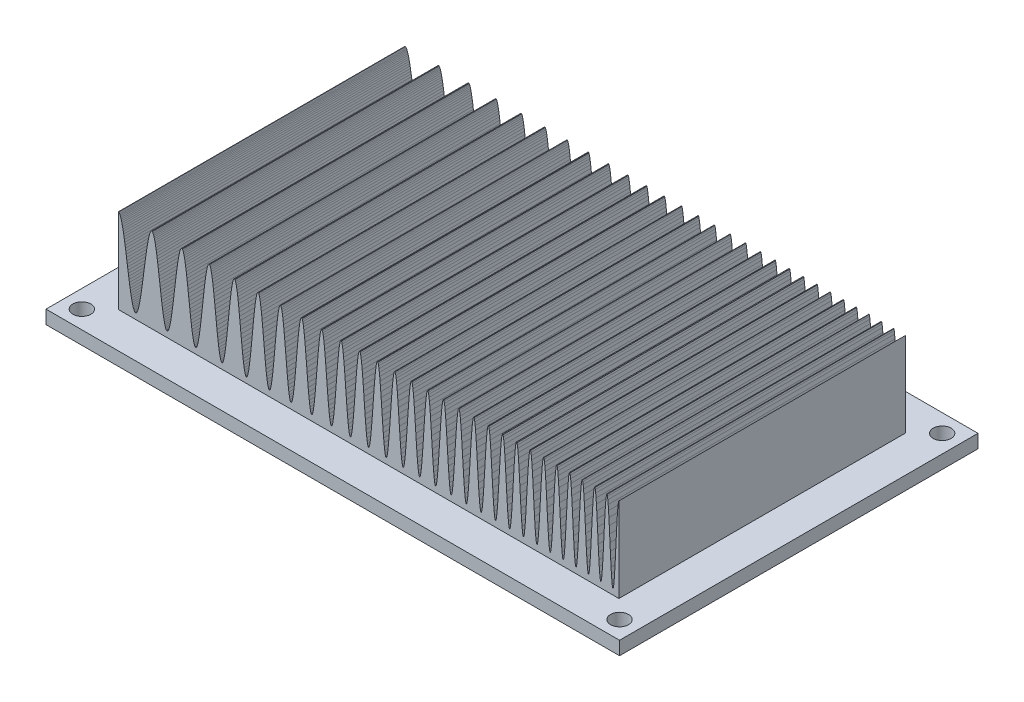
SolidWorks part; units mm, degrees
ref_plane "Front Plane" through (0, 0, 0) normal (0, 0, 1) x (1, 0, 0)
ref_plane "Top Plane" through (0, 0, 0) normal (0, 1, 0) x (1, 0, 0)
ref_plane "Right Plane" through (0, 0, 0) normal (1, 0, 0) x (0, 0, -1)
sketch "Model" plane through (0, 0, 0) normal (0, 0, 1) x (1, 0, 0)
  line L0 (0.2532, 56.5686) -> (0.5066, 56.5133)
  line L1 (0.5066, 56.5133) -> (0.7599, 56.3474)
  line L2 (0.7599, 56.3474) -> (1.0133, 56.071)
  line L3 (1.0133, 56.071) -> (1.2667, 55.6847)
  line L4 (1.2667, 55.6847) -> (1.5201, 55.1897)
  line L5 (1.5201, 55.1897) -> (1.7735, 54.5874)
  line L6 (1.7735, 54.5874) -> (2.0269, 53.8798)
  line L7 (2.0269, 53.8798) -> (2.2802, 53.0693)
  line L8 (2.2802, 53.0693) -> (2.5336, 52.1588)
  line L9 (2.5336, 52.1588) -> (2.787, 51.1516)
  line L10 (2.787, 51.1516) -> (3.0404, 50.0513)
  line L11 (3.0404, 50.0513) -> (3.2938, 48.862)
  line L12 (3.2938, 48.862) -> (3.5471, 47.5882)
  line L13 (3.5471, 47.5882) -> (3.8005, 46.2348)
  line L14 (3.8005, 46.2348) -> (4.0539, 44.807)
  line L15 (4.0539, 44.807) -> (4.3073, 43.3104)
  line L16 (4.3073, 43.3104) -> (4.5607, 41.7509)
  line L17 (4.5607, 41.7509) -> (4.814, 40.1347)
  line L18 (4.814, 40.1347) -> (5.0674, 38.4683)
  line L19 (5.0674, 38.4683) -> (5.3208, 36.7584)
  line L20 (5.3208, 36.7584) -> (5.5742, 35.012)
  line L21 (5.5742, 35.012) -> (5.8276, 33.2364)
  line L22 (5.8276, 33.2364) -> (6.0809, 31.4387)
  line L23 (6.0809, 31.4387) -> (6.3343, 29.6266)
  line L24 (6.3343, 29.6266) -> (6.5877, 27.8076)
  line L25 (6.5877, 27.8076) -> (6.8411, 25.9894)
  line L26 (6.8411, 25.9894) -> (7.0945, 24.1798)
  line L27 (7.0945, 24.1798) -> (7.3479, 22.3865)
  line L28 (7.3479, 22.3865) -> (7.6012, 20.6172)
  line L29 (7.6012, 20.6172) -> (7.8546, 18.8797)
  line L30 (7.8546, 18.8797) -> (8.108, 17.1815)
  line L31 (8.108, 17.1815) -> (8.3614, 15.5301)
  line L32 (8.3614, 15.5301) -> (8.6148, 13.9329)
  line L33 (8.6148, 13.9329) -> (8.8681, 12.397)
  line L34 (8.8681, 12.397) -> (9.1215, 10.9293)
  line L35 (9.1215, 10.9293) -> (9.3749, 9.5365)
  line L36 (9.3749, 9.5365) -> (9.6283, 8.225)
  line L37 (9.6283, 8.225) -> (9.8817, 7.0009)
  line L38 (9.8817, 7.0009) -> (10.135, 5.8699)
  line L39 (10.135, 5.8699) -> (10.3884, 4.8374)
  line L40 (10.3884, 4.8374) -> (10.6418, 3.9083)
  line L41 (10.6418, 3.9083) -> (10.8952, 3.0872)
  line L42 (10.8952, 3.0872) -> (11.1486, 2.3782)
  line L43 (11.1486, 2.3782) -> (11.4019, 1.7849)
  line L44 (11.4019, 1.7849) -> (11.6553, 1.3103)
  line L45 (11.6553, 1.3103) -> (11.9087, 0.9571)
  line L46 (11.9087, 0.9571) -> (12.1621, 0.7275)
  line L47 (12.1621, 0.7275) -> (12.4155, 0.6228)
  line L48 (12.4155, 0.6228) -> (12.6689, 0.644)
  line L49 (12.6689, 0.644) -> (12.9222, 0.7917)
  line L50 (12.9222, 0.7917) -> (13.1756, 1.0657)
  line L51 (13.1756, 1.0657) -> (13.429, 1.465)
  line L52 (13.429, 1.465) -> (13.6824, 1.9886)
  line L53 (13.6824, 1.9886) -> (13.9358, 2.6344)
  line L54 (13.9358, 2.6344) -> (14.1891, 3.4)
  line L55 (14.1891, 3.4) -> (14.4425, 4.2823)
  line L56 (14.4425, 4.2823) -> (14.6959, 5.2778)
  line L57 (14.6959, 5.2778) -> (14.9493, 6.3823)
  line L58 (14.9493, 6.3823) -> (15.2027, 7.5911)
  line L59 (15.2027, 7.5911) -> (15.456, 8.8989)
  line L60 (15.456, 8.8989) -> (15.7094, 10.3002)
  line L61 (15.7094, 10.3002) -> (15.9628, 11.7886)
  line L62 (15.9628, 11.7886) -> (16.2162, 13.3576)
  line L63 (16.2162, 13.3576) -> (16.4696, 15.0002)
  line L64 (16.4696, 15.0002) -> (16.7229, 16.7089)
  line L65 (16.7229, 16.7089) -> (16.9763, 18.4758)
  line L66 (16.9763, 18.4758) -> (17.2297, 20.2929)
  line L67 (17.2297, 20.2929) -> (17.4831, 22.1517)
  line L68 (17.4831, 22.1517) -> (17.7365, 24.0435)
  line L69 (17.7365, 24.0435) -> (17.9899, 25.9594)
  line L70 (17.9899, 25.9594) -> (18.2432, 27.8904)
  line L71 (18.2432, 27.8904) -> (18.4966, 29.8273)
  line L72 (18.4966, 29.8273) -> (18.75, 31.7608)
  line L73 (18.75, 31.7608) -> (19.0034, 33.6815)
  line L74 (19.0034, 33.6815) -> (19.2568, 35.5801)
  line L75 (19.2568, 35.5801) -> (19.5101, 37.4473)
  line L76 (19.5101, 37.4473) -> (19.7635, 39.274)
  line L77 (19.7635, 39.274) -> (20.0169, 41.051)
  line L78 (20.0169, 41.051) -> (20.2703, 42.7696)
  line L79 (20.2703, 42.7696) -> (20.5237, 44.421)
  line L80 (20.5237, 44.421) -> (20.777, 45.9969)
  line L81 (20.777, 45.9969) -> (21.0304, 47.4893)
  line L82 (21.0304, 47.4893) -> (21.2838, 48.8905)
  line L83 (21.2838, 48.8905) -> (21.5372, 50.1932)
  line L84 (21.5372, 50.1932) -> (21.7906, 51.3905)
  line L85 (21.7906, 51.3905) -> (22.0439, 52.4761)
  line L86 (22.0439, 52.4761) -> (22.2973, 53.4443)
  line L87 (22.2973, 53.4443) -> (22.5507, 54.2896)
  line L88 (22.5507, 54.2896) -> (22.8041, 55.0074)
  line L89 (22.8041, 55.0074) -> (23.0575, 55.5936)
  line L90 (23.0575, 55.5936) -> (23.3108, 56.0447)
  line L91 (23.3108, 56.0447) -> (23.5642, 56.358)
  line L92 (23.5642, 56.358) -> (23.8176, 56.5313)
  line L93 (23.8176, 56.5313) -> (24.071, 56.5633)
  line L94 (24.071, 56.5633) -> (24.3244, 56.4532)
  line L95 (24.3244, 56.4532) -> (24.5778, 56.201)
  line L96 (24.5778, 56.201) -> (24.8311, 55.8076)
  line L97 (24.8311, 55.8076) -> (25.0845, 55.2744)
  line L98 (25.0845, 55.2744) -> (25.3379, 54.6036)
  line L99 (25.3379, 54.6036) -> (25.5913, 53.7981)
  line L100 (25.5913, 53.7981) -> (25.8447, 52.8616)
  line L101 (25.8447, 52.8616) -> (26.098, 51.7985)
  line L102 (26.098, 51.7985) -> (26.3514, 50.6138)
  line L103 (26.3514, 50.6138) -> (26.6048, 49.3132)
  line L104 (26.6048, 49.3132) -> (26.8582, 47.903)
  line L105 (26.8582, 47.903) -> (27.1116, 46.3902)
  line L106 (27.1116, 46.3902) -> (27.3649, 44.7824)
  line L107 (27.3649, 44.7824) -> (27.6183, 43.0876)
  line L108 (27.6183, 43.0876) -> (27.8717, 41.3145)
  line L109 (27.8717, 41.3145) -> (28.1251, 39.4721)
  line L110 (28.1251, 39.4721) -> (28.3785, 37.5699)
  line L111 (28.3785, 37.5699) -> (28.6318, 35.6178)
  line L112 (28.6318, 35.6178) -> (28.8852, 33.6259)
  line L113 (28.8852, 33.6259) -> (29.1386, 31.6048)
  line L114 (29.1386, 31.6048) -> (29.392, 29.5651)
  line L115 (29.392, 29.5651) -> (29.6454, 27.5177)
  line L116 (29.6454, 27.5177) -> (29.8987, 25.4736)
  line L117 (29.8987, 25.4736) -> (30.1521, 23.4437)
  line L118 (30.1521, 23.4437) -> (30.4055, 21.4392)
  line L119 (30.4055, 21.4392) -> (30.6589, 19.4708)
  line L120 (30.6589, 19.4708) -> (30.9123, 17.5495)
  line L121 (30.9123, 17.5495) -> (31.1656, 15.6858)
  line L122 (31.1656, 15.6858) -> (31.419, 13.8901)
  line L123 (31.419, 13.8901) -> (31.6724, 12.1725)
  line L124 (31.6724, 12.1725) -> (31.9258, 10.5427)
  line L125 (31.9258, 10.5427) -> (32.1792, 9.0098)
  line L126 (32.1792, 9.0098) -> (32.4325, 7.5828)
  line L127 (32.4325, 7.5828) -> (32.6859, 6.2698)
  line L128 (32.6859, 6.2698) -> (32.9393, 5.0786)
  line L129 (32.9393, 5.0786) -> (33.1927, 4.0161)
  line L130 (33.1927, 4.0161) -> (33.4461, 3.0888)
  line L131 (33.4461, 3.0888) -> (33.6994, 2.3023)
  line L132 (33.6994, 2.3023) -> (33.9528, 1.6614)
  line L133 (33.9528, 1.6614) -> (34.2062, 1.1704)
  line L134 (34.2062, 1.1704) -> (34.4596, 0.8325)
  line L135 (34.4596, 0.8325) -> (34.713, 0.6502)
  line L136 (34.713, 0.6502) -> (34.9664, 0.6249)
  line L137 (34.9664, 0.6249) -> (35.2197, 0.7576)
  line L138 (35.2197, 0.7576) -> (35.4731, 1.0479)
  line L139 (35.4731, 1.0479) -> (35.7265, 1.4948)
  line L140 (35.7265, 1.4948) -> (35.9799, 2.0962)
  line L141 (35.9799, 2.0962) -> (36.2333, 2.8494)
  line L142 (36.2333, 2.8494) -> (36.4866, 3.7506)
  line L143 (36.4866, 3.7506) -> (36.74, 4.795)
  line L144 (36.74, 4.795) -> (36.9934, 5.9773)
  line L145 (36.9934, 5.9773) -> (37.2468, 7.2911)
  line L146 (37.2468, 7.2911) -> (37.5002, 8.7293)
  line L147 (37.5002, 8.7293) -> (37.7535, 10.284)
  line L148 (37.7535, 10.284) -> (38.0069, 11.9466)
  line L149 (38.0069, 11.9466) -> (38.2603, 13.7079)
  line L150 (38.2603, 13.7079) -> (38.5137, 15.5579)
  line L151 (38.5137, 15.5579) -> (38.7671, 17.4861)
  line L152 (38.7671, 17.4861) -> (39.0204, 19.4815)
  line L153 (39.0204, 19.4815) -> (39.2738, 21.5327)
  line L154 (39.2738, 21.5327) -> (39.5272, 23.6277)
  line L155 (39.5272, 23.6277) -> (39.7806, 25.7545)
  line L156 (39.7806, 25.7545) -> (40.034, 27.9005)
  line L157 (40.034, 27.9005) -> (40.2873, 30.0531)
  line L158 (40.2873, 30.0531) -> (40.5407, 32.1995)
  line L159 (40.5407, 32.1995) -> (40.7941, 34.327)
  line L160 (40.7941, 34.327) -> (41.0475, 36.4227)
  line L161 (41.0475, 36.4227) -> (41.3009, 38.4741)
  line L162 (41.3009, 38.4741) -> (41.5542, 40.4688)
  line L163 (41.5542, 40.4688) -> (41.8076, 42.3944)
  line L164 (41.8076, 42.3944) -> (42.061, 44.2393)
  line L165 (42.061, 44.2393) -> (42.3144, 45.992)
  line L166 (42.3144, 45.992) -> (42.5678, 47.6416)
  line L167 (42.5678, 47.6416) -> (42.8211, 49.1776)
  line L168 (42.8211, 49.1776) -> (43.0745, 50.5905)
  line L169 (43.0745, 50.5905) -> (43.3279, 51.8712)
  line L170 (43.3279, 51.8712) -> (43.5813, 53.0113)
  line L171 (43.5813, 53.0113) -> (43.8347, 54.0035)
  line L172 (43.8347, 54.0035) -> (44.088, 54.8412)
  line L173 (44.088, 54.8412) -> (44.3414, 55.5186)
  line L174 (44.3414, 55.5186) -> (44.5948, 56.0311)
  line L175 (44.5948, 56.0311) -> (44.8482, 56.3749)
  line L176 (44.8482, 56.3749) -> (45.1016, 56.5472)
  line L177 (45.1016, 56.5472) -> (45.355, 56.5467)
  line L178 (45.355, 56.5467) -> (45.6083, 56.3724)
  line L179 (45.6083, 56.3724) -> (45.8617, 56.025)
  line L180 (45.8617, 56.025) -> (46.1151, 55.5061)
  line L181 (46.1151, 55.5061) -> (46.3685, 54.8182)
  line L182 (46.3685, 54.8182) -> (46.6219, 53.9651)
  line L183 (46.6219, 53.9651) -> (46.8752, 52.9518)
  line L184 (46.8752, 52.9518) -> (47.1286, 51.7838)
  line L185 (47.1286, 51.7838) -> (47.382, 50.4683)
  line L186 (47.382, 50.4683) -> (47.6354, 49.0129)
  line L187 (47.6354, 49.0129) -> (47.8888, 47.4264)
  line L188 (47.8888, 47.4264) -> (48.1421, 45.7184)
  line L189 (48.1421, 45.7184) -> (48.3955, 43.8995)
  line L190 (48.3955, 43.8995) -> (48.6489, 41.9808)
  line L191 (48.6489, 41.9808) -> (48.9023, 39.9744)
  line L192 (48.9023, 39.9744) -> (49.1557, 37.8928)
  line L193 (49.1557, 37.8928) -> (49.409, 35.749)
  line L194 (49.409, 35.749) -> (49.6624, 33.5568)
  line L195 (49.6624, 33.5568) -> (49.9158, 31.3301)
  line L196 (49.9158, 31.3301) -> (50.1692, 29.0832)
  line L197 (50.1692, 29.0832) -> (50.4226, 26.8307)
  line L198 (50.4226, 26.8307) -> (50.676, 24.587)
  line L199 (50.676, 24.587) -> (50.9293, 22.367)
  line L200 (50.9293, 22.367) -> (51.1827, 20.1851)
  line L201 (51.1827, 20.1851) -> (51.4361, 18.0558)
  line L202 (51.4361, 18.0558) -> (51.6895, 15.9932)
  line L203 (51.6895, 15.9932) -> (51.9429, 14.0111)
  line L204 (51.9429, 14.0111) -> (52.1962, 12.1228)
  line L205 (52.1962, 12.1228) -> (52.4496, 10.3411)
  line L206 (52.4496, 10.3411) -> (52.703, 8.6782)
  line L207 (52.703, 8.6782) -> (52.9564, 7.1454)
  line L208 (52.9564, 7.1454) -> (53.2098, 5.7534)
  line L209 (53.2098, 5.7534) -> (53.4631, 4.5119)
  line L210 (53.4631, 4.5119) -> (53.7165, 3.4297)
  line L211 (53.7165, 3.4297) -> (53.9699, 2.5145)
  line L212 (53.9699, 2.5145) -> (54.2233, 1.7731)
  line L213 (54.2233, 1.7731) -> (54.4767, 1.211)
  line L214 (54.4767, 1.211) -> (54.73, 0.8326)
  line L215 (54.73, 0.8326) -> (54.9834, 0.641)
  line L216 (54.9834, 0.641) -> (55.2368, 0.6382)
  line L217 (55.2368, 0.6382) -> (55.4902, 0.8247)
  line L218 (55.4902, 0.8247) -> (55.7436, 1.2)
  line L219 (55.7436, 1.2) -> (55.997, 1.7621)
  line L220 (55.997, 1.7621) -> (56.2503, 2.5077)
  line L221 (56.2503, 2.5077) -> (56.5037, 3.4324)
  line L222 (56.5037, 3.4324) -> (56.7571, 4.5304)
  line L223 (56.7571, 4.5304) -> (57.0105, 5.7948)
  line L224 (57.0105, 5.7948) -> (57.2639, 7.2173)
  line L225 (57.2639, 7.2173) -> (57.5172, 8.7887)
  line L226 (57.5172, 8.7887) -> (57.7706, 10.4986)
  line L227 (57.7706, 10.4986) -> (58.024, 12.3357)
  line L228 (58.024, 12.3357) -> (58.2774, 14.2874)
  line L229 (58.2774, 14.2874) -> (58.5308, 16.3408)
  line L230 (58.5308, 16.3408) -> (58.7841, 18.4818)
  line L231 (58.7841, 18.4818) -> (59.0375, 20.6956)
  line L232 (59.0375, 20.6956) -> (59.2909, 22.967)
  line L233 (59.2909, 22.967) -> (59.5443, 25.2804)
  line L234 (59.5443, 25.2804) -> (59.7977, 27.6195)
  line L235 (59.7977, 27.6195) -> (60.051, 29.9679)
  line L236 (60.051, 29.9679) -> (60.3044, 32.3091)
  line L237 (60.3044, 32.3091) -> (60.5578, 34.6266)
  line L238 (60.5578, 34.6266) -> (60.8112, 36.9037)
  line L239 (60.8112, 36.9037) -> (61.0646, 39.1242)
  line L240 (61.0646, 39.1242) -> (61.318, 41.2721)
  line L241 (61.318, 41.2721) -> (61.5713, 43.3318)
  line L242 (61.5713, 43.3318) -> (61.8247, 45.2883)
  line L243 (61.8247, 45.2883) -> (62.0781, 47.1273)
  line L244 (62.0781, 47.1273) -> (62.3315, 48.8352)
  line L245 (62.3315, 48.8352) -> (62.5849, 50.3992)
  line L246 (62.5849, 50.3992) -> (62.8382, 51.8077)
  line L247 (62.8382, 51.8077) -> (63.0916, 53.0499)
  line L248 (63.0916, 53.0499) -> (63.345, 54.1164)
  line L249 (63.345, 54.1164) -> (63.5984, 54.9988)
  line L250 (63.5984, 54.9988) -> (63.8518, 55.6901)
  line L251 (63.8518, 55.6901) -> (64.1051, 56.1847)
  line L252 (64.1051, 56.1847) -> (64.3585, 56.4784)
  line L253 (64.3585, 56.4784) -> (64.6119, 56.5684)
  line L254 (64.6119, 56.5684) -> (64.8653, 56.4533)
  line L255 (64.8653, 56.4533) -> (65.1187, 56.1334)
  line L256 (65.1187, 56.1334) -> (65.372, 55.6104)
  line L257 (65.372, 55.6104) -> (65.6254, 54.8874)
  line L258 (65.6254, 54.8874) -> (65.8788, 53.9694)
  line L259 (65.8788, 53.9694) -> (66.1322, 52.8623)
  line L260 (66.1322, 52.8623) -> (66.3856, 51.574)
  line L261 (66.3856, 51.574) -> (66.639, 50.1133)
  line L262 (66.639, 50.1133) -> (66.8923, 48.4906)
  line L263 (66.8923, 48.4906) -> (67.1457, 46.7176)
  line L264 (67.1457, 46.7176) -> (67.3991, 44.807)
  line L265 (67.3991, 44.807) -> (67.6525, 42.7729)
  line L266 (67.6525, 42.7729) -> (67.9059, 40.63)
  line L267 (67.9059, 40.63) -> (68.1592, 38.3943)
  line L268 (68.1592, 38.3943) -> (68.4126, 36.0823)
  line L269 (68.4126, 36.0823) -> (68.666, 33.7112)
  line L270 (68.666, 33.7112) -> (68.9194, 31.2989)
  line L271 (68.9194, 31.2989) -> (69.1728, 28.8635)
  line L272 (69.1728, 28.8635) -> (69.4261, 26.4236)
  line L273 (69.4261, 26.4236) -> (69.6795, 23.9977)
  line L274 (69.6795, 23.9977) -> (69.9329, 21.6045)
  line L275 (69.9329, 21.6045) -> (70.1863, 19.2623)
  line L276 (70.1863, 19.2623) -> (70.4397, 16.9893)
  line L277 (70.4397, 16.9893) -> (70.693, 14.8032)
  line L278 (70.693, 14.8032) -> (70.9464, 12.7212)
  line L279 (70.9464, 12.7212) -> (71.1998, 10.7595)
  line L280 (71.1998, 10.7595) -> (71.4532, 8.9338)
  line L281 (71.4532, 8.9338) -> (71.7066, 7.2587)
  line L282 (71.7066, 7.2587) -> (71.96, 5.7476)
  line L283 (71.96, 5.7476) -> (72.2133, 4.4127)
  line L284 (72.2133, 4.4127) -> (72.4667, 3.2652)
  line L285 (72.4667, 3.2652) -> (72.7201, 2.3144)
  line L286 (72.7201, 2.3144) -> (72.9735, 1.5684)
  line L287 (72.9735, 1.5684) -> (73.2269, 1.0338)
  line L288 (73.2269, 1.0338) -> (73.4802, 0.7153)
  line L289 (73.4802, 0.7153) -> (73.7336, 0.6162)
  line L290 (73.7336, 0.6162) -> (73.987, 0.7379)
  line L291 (73.987, 0.7379) -> (74.2404, 1.08)
  line L292 (74.2404, 1.08) -> (74.4938, 1.6405)
  line L293 (74.4938, 1.6405) -> (74.7471, 2.4158)
  line L294 (74.7471, 2.4158) -> (75.0005, 3.4001)
  line L295 (75.0005, 3.4001) -> (75.2539, 4.5863)
  line L296 (75.2539, 4.5863) -> (75.5073, 5.9656)
  line L297 (75.5073, 5.9656) -> (75.7607, 7.5274)
  line L298 (75.7607, 7.5274) -> (76.014, 9.2598)
  line L299 (76.014, 9.2598) -> (76.2674, 11.1493)
  line L300 (76.2674, 11.1493) -> (76.5208, 13.1813)
  line L301 (76.5208, 13.1813) -> (76.7742, 15.3396)
  line L302 (76.7742, 15.3396) -> (77.0276, 17.6073)
  line L303 (77.0276, 17.6073) -> (77.2809, 19.9663)
  line L304 (77.2809, 19.9663) -> (77.5343, 22.3976)
  line L305 (77.5343, 22.3976) -> (77.7877, 24.8818)
  line L306 (77.7877, 24.8818) -> (78.0411, 27.3986)
  line L307 (78.0411, 27.3986) -> (78.2945, 29.9278)
  line L308 (78.2945, 29.9278) -> (78.5478, 32.4484)
  line L309 (78.5478, 32.4484) -> (78.8012, 34.94)
  line L310 (78.8012, 34.94) -> (79.0546, 37.3819)
  line L311 (79.0546, 37.3819) -> (79.308, 39.7538)
  line L312 (79.308, 39.7538) -> (79.5614, 42.0359)
  line L313 (79.5614, 42.0359) -> (79.8148, 44.2092)
  line L314 (79.8148, 44.2092) -> (80.0681, 46.2553)
  line L315 (80.0681, 46.2553) -> (80.3215, 48.1568)
  line L316 (80.3215, 48.1568) -> (80.5749, 49.8975)
  line L317 (80.5749, 49.8975) -> (80.8283, 51.4624)
  line L318 (80.8283, 51.4624) -> (81.0817, 52.8379)
  line L319 (81.0817, 52.8379) -> (81.335, 54.012)
  line L320 (81.335, 54.012) -> (81.5884, 54.9742)
  line L321 (81.5884, 54.9742) -> (81.8418, 55.7158)
  line L322 (81.8418, 55.7158) -> (82.0952, 56.23)
  line L323 (82.0952, 56.23) -> (82.3486, 56.5116)
  line L324 (82.3486, 56.5116) -> (82.6019, 56.5577)
  line L325 (82.6019, 56.5577) -> (82.8553, 56.3672)
  line L326 (82.8553, 56.3672) -> (83.1087, 55.941)
  line L327 (83.1087, 55.941) -> (83.3621, 55.282)
  line L328 (83.3621, 55.282) -> (83.6155, 54.3952)
  line L329 (83.6155, 54.3952) -> (83.8688, 53.2875)
  line L330 (83.8688, 53.2875) -> (84.1222, 51.9676)
  line L331 (84.1222, 51.9676) -> (84.3756, 50.4464)
  line L332 (84.3756, 50.4464) -> (84.629, 48.7361)
  line L333 (84.629, 48.7361) -> (84.8824, 46.8511)
  line L334 (84.8824, 46.8511) -> (85.1357, 44.807)
  line L335 (85.1357, 44.807) -> (85.3891, 42.6211)
  line L336 (85.3891, 42.6211) -> (85.6425, 40.3118)
  line L337 (85.6425, 40.3118) -> (85.8959, 37.8987)
  line L338 (85.8959, 37.8987) -> (86.1493, 35.4025)
  line L339 (86.1493, 35.4025) -> (86.4026, 32.8447)
  line L340 (86.4026, 32.8447) -> (86.656, 30.2475)
  line L341 (86.656, 30.2475) -> (86.9094, 27.6332)
  line L342 (86.9094, 27.6332) -> (87.1628, 25.0249)
  line L343 (87.1628, 25.0249) -> (87.4162, 22.4454)
  line L344 (87.4162, 22.4454) -> (87.6695, 19.9173)
  line L345 (87.6695, 19.9173) -> (87.9229, 17.4631)
  line L346 (87.9229, 17.4631) -> (88.1763, 15.1047)
  line L347 (88.1763, 15.1047) -> (88.4297, 12.8631)
  line L348 (88.4297, 12.8631) -> (88.6831, 10.7585)
  line L349 (88.6831, 10.7585) -> (88.9364, 8.81)
  line L350 (88.9364, 8.81) -> (89.1898, 7.0353)
  line L351 (89.1898, 7.0353) -> (89.4432, 5.4508)
  line L352 (89.4432, 5.4508) -> (89.6966, 4.071)
  line L353 (89.6966, 4.071) -> (89.95, 2.9089)
  line L354 (89.95, 2.9089) -> (90.2034, 1.9755)
  line L355 (90.2034, 1.9755) -> (90.4567, 1.2799)
  line L356 (90.4567, 1.2799) -> (90.7101, 0.8289)
  line L357 (90.7101, 0.8289) -> (90.9635, 0.6273)
  line L358 (90.9635, 0.6273) -> (91.2169, 0.6777)
  line L359 (91.2169, 0.6777) -> (91.4703, 0.9803)
  line L360 (91.4703, 0.9803) -> (91.7236, 1.533)
  line L361 (91.7236, 1.533) -> (91.977, 2.3317)
  line L362 (91.977, 2.3317) -> (92.2304, 3.3696)
  line L363 (92.2304, 3.3696) -> (92.4838, 4.6381)
  line L364 (92.4838, 4.6381) -> (92.7372, 6.1261)
  line L365 (92.7372, 6.1261) -> (92.9905, 7.8209)
  line L366 (92.9905, 7.8209) -> (93.2439, 9.7073)
  line L367 (93.2439, 9.7073) -> (93.4973, 11.7686)
  line L368 (93.4973, 11.7686) -> (93.7507, 13.9865)
  line L369 (93.7507, 13.9865) -> (94.0041, 16.3408)
  line L370 (94.0041, 16.3408) -> (94.2574, 18.8103)
  line L371 (94.2574, 18.8103) -> (94.5108, 21.3725)
  line L372 (94.5108, 21.3725) -> (94.7642, 24.0039)
  line L373 (94.7642, 24.0039) -> (95.0176, 26.6803)
  line L374 (95.0176, 26.6803) -> (95.271, 29.377)
  line L375 (95.271, 29.377) -> (95.5243, 32.0688)
  line L376 (95.5243, 32.0688) -> (95.7777, 34.7307)
  line L377 (95.7777, 34.7307) -> (96.0311, 37.3377)
  line L378 (96.0311, 37.3377) -> (96.2845, 39.8654)
  line L379 (96.2845, 39.8654) -> (96.5379, 42.2896)
  line L380 (96.5379, 42.2896) -> (96.7912, 44.5874)
  line L381 (96.7912, 44.5874) -> (97.0446, 46.7367)
  line L382 (97.0446, 46.7367) -> (97.298, 48.717)
  line L383 (97.298, 48.717) -> (97.5514, 50.5089)
  line L384 (97.5514, 50.5089) -> (97.8048, 52.0951)
  line L385 (97.8048, 52.0951) -> (98.0581, 53.4599)
  line L386 (98.0581, 53.4599) -> (98.3115, 54.5898)
  line L387 (98.3115, 54.5898) -> (98.5649, 55.4732)
  line L388 (98.5649, 55.4732) -> (98.8183, 56.1012)
  line L389 (98.8183, 56.1012) -> (99.0717, 56.4671)
  line L390 (99.0717, 56.4671) -> (99.325, 56.5665)
  line L391 (99.325, 56.5665) -> (99.5784, 56.3979)
  line L392 (99.5784, 56.3979) -> (99.8318, 55.962)
  line L393 (99.8318, 55.962) -> (100.0852, 55.2624)
  line L394 (100.0852, 55.2624) -> (100.3386, 54.305)
  line L395 (100.3386, 54.305) -> (100.592, 53.0985)
  line L396 (100.592, 53.0985) -> (100.8453, 51.6538)
  line L397 (100.8453, 51.6538) -> (101.0987, 49.9844)
  line L398 (101.0987, 49.9844) -> (101.3521, 48.1056)
  line L399 (101.3521, 48.1056) -> (101.6055, 46.0353)
  line L400 (101.6055, 46.0353) -> (101.8589, 43.7932)
  line L401 (101.8589, 43.7932) -> (102.1122, 41.4006)
  line L402 (102.1122, 41.4006) -> (102.3656, 38.8806)
  line L403 (102.3656, 38.8806) -> (102.619, 36.2575)
  line L404 (102.619, 36.2575) -> (102.8724, 33.5568)
  line L405 (102.8724, 33.5568) -> (103.1258, 30.8049)
  line L406 (103.1258, 30.8049) -> (103.3791, 28.0286)
  line L407 (103.3791, 28.0286) -> (103.6325, 25.2554)
  line L408 (103.6325, 25.2554) -> (103.8859, 22.5128)
  line L409 (103.8859, 22.5128) -> (104.1393, 19.8278)
  line L410 (104.1393, 19.8278) -> (104.3927, 17.2274)
  line L411 (104.3927, 17.2274) -> (104.646, 14.7377)
  line L412 (104.646, 14.7377) -> (104.8994, 12.3837)
  line L413 (104.8994, 12.3837) -> (105.1528, 10.1894)
  line L414 (105.1528, 10.1894) -> (105.4062, 8.1769)
  line L415 (105.4062, 8.1769) -> (105.6596, 6.3671)
  line L416 (105.6596, 6.3671) -> (105.913, 4.7786)
  line L417 (105.913, 4.7786) -> (106.1663, 3.428)
  line L418 (106.1663, 3.428) -> (106.4197, 2.3295)
  line L419 (106.4197, 2.3295) -> (106.6731, 1.4949)
  line L420 (106.6731, 1.4949) -> (106.9265, 0.9332)
  line L421 (106.9265, 0.9332) -> (107.1799, 0.651)
  line L422 (107.1799, 0.651) -> (107.4332, 0.6518)
  line L423 (107.4332, 0.6518) -> (107.6866, 0.9364)
  line L424 (107.6866, 0.9364) -> (107.94, 1.5026)
  line L425 (107.94, 1.5026) -> (108.1934, 2.3455)
  line L426 (108.1934, 2.3455) -> (108.4468, 3.4571)
  line L427 (108.4468, 3.4571) -> (108.7001, 4.8268)
  line L428 (108.7001, 4.8268) -> (108.9535, 6.4413)
  line L429 (108.9535, 6.4413) -> (109.2069, 8.2845)
  line L430 (109.2069, 8.2845) -> (109.4603, 10.3383)
  line L431 (109.4603, 10.3383) -> (109.7137, 12.5818)
  line L432 (109.7137, 12.5818) -> (109.967, 14.9926)
  line L433 (109.967, 14.9926) -> (110.2204, 17.5461)
  line L434 (110.2204, 17.5461) -> (110.4738, 20.2162)
  line L435 (110.4738, 20.2162) -> (110.7272, 22.9756)
  line L436 (110.7272, 22.9756) -> (110.9806, 25.7958)
  line L437 (110.9806, 25.7958) -> (111.2339, 28.6475)
  line L438 (111.2339, 28.6475) -> (111.4873, 31.5012)
  line L439 (111.4873, 31.5012) -> (111.7407, 34.327)
  line L440 (111.7407, 34.327) -> (111.9941, 37.0953)
  line L441 (111.9941, 37.0953) -> (112.2475, 39.7768)
  line L442 (112.2475, 39.7768) -> (112.5009, 42.3431)
  line L443 (112.5009, 42.3431) -> (112.7542, 44.7671)
  line L444 (112.7542, 44.7671) -> (113.0076, 47.0227)
  line L445 (113.0076, 47.0227) -> (113.261, 49.0856)
  line L446 (113.261, 49.0856) -> (113.5144, 50.9337)
  line L447 (113.5144, 50.9337) -> (113.7678, 52.5466)
  line L448 (113.7678, 52.5466) -> (114.0211, 53.9066)
  line L449 (114.0211, 53.9066) -> (114.2745, 54.9987)
  line L450 (114.2745, 54.9987) -> (114.5279, 55.8106)
  line L451 (114.5279, 55.8106) -> (114.7813, 56.3327)
  line L452 (114.7813, 56.3327) -> (115.0347, 56.5589)
  line L453 (115.0347, 56.5589) -> (115.288, 56.4858)
  line L454 (115.288, 56.4858) -> (115.5414, 56.1135)
  line L455 (115.5414, 56.1135) -> (115.7948, 55.4452)
  line L456 (115.7948, 55.4452) -> (116.0482, 54.4874)
  line L457 (116.0482, 54.4874) -> (116.3016, 53.2496)
  line L458 (116.3016, 53.2496) -> (116.5549, 51.7444)
  line L459 (116.5549, 51.7444) -> (116.8083, 49.9876)
  line L460 (116.8083, 49.9876) -> (117.0617, 47.9973)
  line L461 (117.0617, 47.9973) -> (117.3151, 45.7947)
  line L462 (117.3151, 45.7947) -> (117.5685, 43.4032)
  line L463 (117.5685, 43.4032) -> (117.8219, 40.8483)
  line L464 (117.8219, 40.8483) -> (118.0752, 38.1575)
  line L465 (118.0752, 38.1575) -> (118.3286, 35.3598)
  line L466 (118.3286, 35.3598) -> (118.582, 32.4857)
  line L467 (118.582, 32.4857) -> (118.8354, 29.5664)
  line L468 (118.8354, 29.5664) -> (119.0888, 26.634)
  line L469 (119.0888, 26.634) -> (119.3421, 23.7205)
  line L470 (119.3421, 23.7205) -> (119.5955, 20.8583)
  line L471 (119.5955, 20.8583) -> (119.8489, 18.079)
  line L472 (119.8489, 18.079) -> (120.1023, 15.4137)
  line L473 (120.1023, 15.4137) -> (120.3557, 12.8922)
  line L474 (120.3557, 12.8922) -> (120.609, 10.5427)
  line L475 (120.609, 10.5427) -> (120.8624, 8.3919)
  line L476 (120.8624, 8.3919) -> (121.1158, 6.4643)
  line L477 (121.1158, 6.4643) -> (121.3692, 4.7819)
  line L478 (121.3692, 4.7819) -> (121.6226, 3.3641)
  line L479 (121.6226, 3.3641) -> (121.876, 2.2276)
  line L480 (121.876, 2.2276) -> (122.1293, 1.3857)
  line L481 (122.1293, 1.3857) -> (122.3827, 0.8486)
  line L482 (122.3827, 0.8486) -> (122.6361, 0.6233)
  line L483 (122.6361, 0.6233) -> (122.8895, 0.7129)
  line L484 (122.8895, 0.7129) -> (123.1429, 1.1173)
  line L485 (123.1429, 1.1173) -> (123.3962, 1.8328)
  line L486 (123.3962, 1.8328) -> (123.6496, 2.8519)
  line L487 (123.6496, 2.8519) -> (123.903, 4.164)
  line L488 (123.903, 4.164) -> (124.1564, 5.7548)
  line L489 (124.1564, 5.7548) -> (124.4098, 7.6069)
  line L490 (124.4098, 7.6069) -> (124.6631, 9.6999)
  line L491 (124.6631, 9.6999) -> (124.9165, 12.0103)
  line L492 (124.9165, 12.0103) -> (125.1699, 14.5125)
  line L493 (125.1699, 14.5125) -> (125.4233, 17.1781)
  line L494 (125.4233, 17.1781) -> (125.6767, 19.977)
  line L495 (125.6767, 19.977) -> (125.93, 22.8772)
  line L496 (125.93, 22.8772) -> (126.1834, 25.8457)
  line L497 (126.1834, 25.8457) -> (126.4368, 28.8484)
  line L498 (126.4368, 28.8484) -> (126.6902, 31.8506)
  line L499 (126.6902, 31.8506) -> (126.9436, 34.8176)
  line L500 (126.9436, 34.8176) -> (127.197, 37.7149)
  line L501 (127.197, 37.7149) -> (127.4503, 40.5086)
  line L502 (127.4503, 40.5086) -> (127.7037, 43.166)
  line L503 (127.7037, 43.166) -> (127.9571, 45.6558)
  line L504 (127.9571, 45.6558) -> (128.2105, 47.9484)
  line L505 (128.2105, 47.9484) -> (128.4639, 50.0166)
  line L506 (128.4639, 50.0166) -> (128.7172, 51.8357)
  line L507 (128.7172, 51.8357) -> (128.9706, 53.3835)
  line L508 (128.9706, 53.3835) -> (129.224, 54.6414)
  line L509 (129.224, 54.6414) -> (129.4774, 55.5936)
  line L510 (129.4774, 55.5936) -> (129.7308, 56.2284)
  line L511 (129.7308, 56.2284) -> (129.9841, 56.5373)
  line L512 (129.9841, 56.5373) -> (130.2375, 56.5159)
  line L513 (130.2375, 56.5159) -> (130.4909, 56.1637)
  line L514 (130.4909, 56.1637) -> (130.7443, 55.484)
  line L515 (130.7443, 55.484) -> (130.9977, 54.484)
  line L516 (130.9977, 54.484) -> (131.251, 53.1751)
  line L517 (131.251, 53.1751) -> (131.5044, 51.5718)
  line L518 (131.5044, 51.5718) -> (131.7578, 49.6927)
  line L519 (131.7578, 49.6927) -> (132.0112, 47.5596)
  line L520 (132.0112, 47.5596) -> (132.2646, 45.1975)
  line L521 (132.2646, 45.1975) -> (132.5179, 42.6341)
  line L522 (132.5179, 42.6341) -> (132.7713, 39.8998)
  line L523 (132.7713, 39.8998) -> (133.0247, 37.0271)
  line L524 (133.0247, 37.0271) -> (133.2781, 34.0502)
  line L525 (133.2781, 34.0502) -> (133.5315, 31.005)
  line L526 (133.5315, 31.005) -> (133.7848, 27.9282)
  line L527 (133.7848, 27.9282) -> (134.0382, 24.8568)
  line L528 (134.0382, 24.8568) -> (134.2916, 21.8284)
  line L529 (134.2916, 21.8284) -> (134.545, 18.8797)
  line L530 (134.545, 18.8797) -> (134.7984, 16.047)
  line L531 (134.7984, 16.047) -> (135.0517, 13.3651)
  line L532 (135.0517, 13.3651) -> (135.3051, 10.8671)
  line L533 (135.3051, 10.8671) -> (135.5585, 8.584)
  line L534 (135.5585, 8.584) -> (135.8119, 6.5445)
  line L535 (135.8119, 6.5445) -> (136.0653, 4.774)
  line L536 (136.0653, 4.774) -> (136.3187, 3.2951)
  line L537 (136.3187, 3.2951) -> (136.572, 2.1267)
  line L538 (136.572, 2.1267) -> (136.8254, 1.2839)
  line L539 (136.8254, 1.2839) -> (137.0788, 0.778)
  line L540 (137.0788, 0.778) -> (137.3322, 0.6161)
  line L541 (137.3322, 0.6161) -> (137.5856, 0.8009)
  line L542 (137.5856, 0.8009) -> (137.8389, 1.3311)
  line L543 (137.8389, 1.3311) -> (138.0923, 2.2008)
  line L544 (138.0923, 2.2008) -> (138.3457, 3.4001)
  line L545 (138.3457, 3.4001) -> (138.5991, 4.9147)
  line L546 (138.5991, 4.9147) -> (138.8525, 6.7265)
  line L547 (138.8525, 6.7265) -> (139.1058, 8.8135)
  line L548 (139.1058, 8.8135) -> (139.3592, 11.1503)
  line L549 (139.3592, 11.1503) -> (139.6126, 13.7079)
  line L550 (139.6126, 13.7079) -> (139.866, 16.4549)
  line L551 (139.866, 16.4549) -> (140.1194, 19.357)
  line L552 (140.1194, 19.357) -> (140.3727, 22.378)
  line L553 (140.3727, 22.378) -> (140.6261, 25.4799)
  line L554 (140.6261, 25.4799) -> (140.8795, 28.6237)
  line L555 (140.8795, 28.6237) -> (141.1329, 31.7696)
  line L556 (141.1329, 31.7696) -> (141.3863, 34.8776)
  line L557 (141.3863, 34.8776) -> (141.6396, 37.9081)
  line L558 (141.6396, 37.9081) -> (141.893, 40.8223)
  line L559 (141.893, 40.8223) -> (142.1464, 43.5828)
  line L560 (142.1464, 43.5828) -> (142.3998, 46.1538)
  line L561 (142.3998, 46.1538) -> (142.6532, 48.502)
  line L562 (142.6532, 48.502) -> (142.9065, 50.5968)
  line L563 (142.9065, 50.5968) -> (143.1599, 52.4106)
  line L564 (143.1599, 52.4106) -> (143.4133, 53.9195)
  line L565 (143.4133, 53.9195) -> (143.6667, 55.1032)
  line L566 (143.6667, 55.1032) -> (143.9201, 55.9457)
  line L567 (143.9201, 55.9457) -> (144.1734, 56.4354)
  line L568 (144.1734, 56.4354) -> (144.4268, 56.565)
  line L569 (144.4268, 56.565) -> (144.6802, 56.3321)
  line L570 (144.6802, 56.3321) -> (144.9336, 55.7387)
  line L571 (144.9336, 55.7387) -> (145.187, 54.7918)
  line L572 (145.187, 54.7918) -> (145.4403, 53.5029)
  line L573 (145.4403, 53.5029) -> (145.6937, 51.888)
  line L574 (145.6937, 51.888) -> (145.9471, 49.9673)
  line L575 (145.9471, 49.9673) -> (146.2005, 47.7654)
  line L576 (146.2005, 47.7654) -> (146.4539, 45.3105)
  line L577 (146.4539, 45.3105) -> (146.7073, 42.6341)
  line L578 (146.7073, 42.6341) -> (146.9606, 39.771)
  line L579 (146.9606, 39.771) -> (147.214, 36.7584)
  line L580 (147.214, 36.7584) -> (147.4674, 33.6358)
  line L581 (147.4674, 33.6358) -> (147.7208, 30.4442)
  line L582 (147.7208, 30.4442) -> (147.9742, 27.2255)
  line L583 (147.9742, 27.2255) -> (148.2275, 24.0225)
  line L584 (148.2275, 24.0225) -> (148.4809, 20.8776)
  line L585 (148.4809, 20.8776) -> (148.7343, 17.8329)
  line L586 (148.7343, 17.8329) -> (148.9877, 14.929)
  line L587 (148.9877, 14.929) -> (149.2411, 12.2051)
  line L588 (149.2411, 12.2051) -> (149.4944, 9.698)
  line L589 (149.4944, 9.698) -> (149.7478, 7.4417)
  line L590 (149.7478, 7.4417) -> (150.0012, 5.467)
  line L591 (150.0012, 5.467) -> (150.2546, 3.8011)
  line L592 (150.2546, 3.8011) -> (150.508, 2.467)
  line L593 (150.508, 2.467) -> (150.7613, 1.4836)
  line L594 (150.7613, 1.4836) -> (151.0147, 0.8649)
  line L595 (151.0147, 0.8649) -> (151.2681, 0.62)
  line L596 (151.2681, 0.62) -> (151.5215, 0.7533)
  line L597 (151.5215, 0.7533) -> (151.7749, 1.2636)
  line L598 (151.7749, 1.2636) -> (152.0282, 2.145)
  line L599 (152.0282, 2.145) -> (152.2816, 3.3864)
  line L600 (152.2816, 3.3864) -> (152.535, 4.9717)
  line L601 (152.535, 4.9717) -> (152.7884, 6.8801)
  line L602 (152.7884, 6.8801) -> (153.0418, 9.0862)
  line L603 (153.0418, 9.0862) -> (153.2951, 11.5607)
  line L604 (153.2951, 11.5607) -> (153.5485, 14.2702)
  line L605 (153.5485, 14.2702) -> (153.8019, 17.1781)
  line L606 (153.8019, 17.1781) -> (154.0553, 20.245)
  line L607 (154.0553, 20.245) -> (154.3087, 23.429)
  line L608 (154.3087, 23.429) -> (154.562, 26.6866)
  line L609 (154.562, 26.6866) -> (154.8154, 29.9729)
  line L610 (154.8154, 29.9729) -> (155.0688, 33.2426)
  line L611 (155.0688, 33.2426) -> (155.3222, 36.4505)
  line L612 (155.3222, 36.4505) -> (155.5756, 39.5519)
  line L613 (155.5756, 39.5519) -> (155.829, 42.5036)
  line L614 (155.829, 42.5036) -> (156.0823, 45.2641)
  line L615 (156.0823, 45.2641) -> (156.3357, 47.7946)
  line L616 (156.3357, 47.7946) -> (156.5891, 50.0594)
  line L617 (156.5891, 50.0594) -> (156.8425, 52.0261)
  line L618 (156.8425, 52.0261) -> (157.0959, 53.6665)
  line L619 (157.0959, 53.6665) -> (157.3492, 54.957)
  line L620 (157.3492, 54.957) -> (157.6026, 55.8787)
  line L621 (157.6026, 55.8787) -> (157.856, 56.4177)
  line L622 (157.856, 56.4177) -> (158.1094, 56.5656)
  line L623 (158.1094, 56.5656) -> (158.3628, 56.3195)
  line L624 (158.3628, 56.3195) -> (158.6161, 55.6819)
  line L625 (158.6161, 55.6819) -> (158.8695, 54.661)
  line L626 (158.8695, 54.661) -> (159.1229, 53.2703)
  line L627 (159.1229, 53.2703) -> (159.3763, 51.5287)
  line L628 (159.3763, 51.5287) -> (159.6297, 49.4602)
  line L629 (159.6297, 49.4602) -> (159.883, 47.0934)
  line L630 (159.883, 47.0934) -> (160.1364, 44.4614)
  line L631 (160.1364, 44.4614) -> (160.3898, 41.6011)
  line L632 (160.3898, 41.6011) -> (160.6432, 38.5529)
  line L633 (160.6432, 38.5529) -> (160.8966, 35.3598)
  line L634 (160.8966, 35.3598) -> (161.15, 32.0675)
  line L635 (161.15, 32.0675) -> (161.4033, 28.7229)
  line L636 (161.4033, 28.7229) -> (161.6567, 25.3739)
  line L637 (161.6567, 25.3739) -> (161.9101, 22.0686)
  line L638 (161.9101, 22.0686) -> (162.1635, 18.855)
  line L639 (162.1635, 18.855) -> (162.4169, 15.7795)
  line L640 (162.4169, 15.7795) -> (162.6702, 12.887)
  line L641 (162.6702, 12.887) -> (162.9236, 10.2196)
  line L642 (162.9236, 10.2196) -> (163.177, 7.8166)
  line L643 (163.177, 7.8166) -> (163.4304, 5.7135)
  line L644 (163.4304, 5.7135) -> (163.6838, 3.9415)
  line L645 (163.6838, 3.9415) -> (163.9371, 2.5272)
  line L646 (163.9371, 2.5272) -> (164.1905, 1.492)
  line L647 (164.1905, 1.492) -> (164.4439, 0.8519)
  line L648 (164.4439, 0.8519) -> (164.6973, 0.617)
  line L649 (164.6973, 0.617) -> (164.9507, 0.7918)
  line L650 (164.9507, 0.7918) -> (165.204, 1.3746)
  line L651 (165.204, 1.3746) -> (165.4574, 2.3577)
  line L652 (165.4574, 2.3577) -> (165.7108, 3.7276)
  line L653 (165.7108, 3.7276) -> (165.9642, 5.4649)
  line L654 (165.9642, 5.4649) -> (166.2176, 7.5447)
  line L655 (166.2176, 7.5447) -> (166.4709, 9.9372)
  line L656 (166.4709, 9.9372) -> (166.7243, 12.6076)
  line L657 (166.7243, 12.6076) -> (166.9777, 15.5168)
  line L658 (166.9777, 15.5168) -> (167.2311, 18.6223)
  line L659 (167.2311, 18.6223) -> (167.4845, 21.8783)
  line L660 (167.4845, 21.8783) -> (167.7379, 25.2367)
  line L661 (167.7379, 25.2367) -> (167.9912, 28.6475)
  line L662 (167.9912, 28.6475) -> (168.2446, 32.06)
  line L663 (168.2446, 32.06) -> (168.498, 35.4232)
  line L664 (168.498, 35.4232) -> (168.7514, 38.6865)
  line L665 (168.7514, 38.6865) -> (169.0048, 41.8008)
  line L666 (169.0048, 41.8008) -> (169.2581, 44.7189)
  line L667 (169.2581, 44.7189) -> (169.5115, 47.3966)
  line L668 (169.5115, 47.3966) -> (169.7649, 49.793)
  line L669 (169.7649, 49.793) -> (170.0183, 51.8712)
  line L670 (170.0183, 51.8712) -> (170.2717, 53.5993)
  line L671 (170.2717, 53.5993) -> (170.525, 54.9503)
  line L672 (170.525, 54.9503) -> (170.7784, 55.9029)
  line L673 (170.7784, 55.9029) -> (171.0318, 56.4417)
  line L674 (171.0318, 56.4417) -> (171.2852, 56.5577)
  line L675 (171.2852, 56.5577) -> (171.5386, 56.2482)
  line L676 (171.5386, 56.2482) -> (171.7919, 55.517)
  line L677 (171.7919, 55.517) -> (172.0453, 54.3743)
  line L678 (172.0453, 54.3743) -> (172.2987, 52.8366)
  line L679 (172.2987, 52.8366) -> (172.5521, 50.9268)
  line L680 (172.5521, 50.9268) -> (172.8055, 48.6733)
  line L681 (172.8055, 48.6733) -> (173.0589, 46.1098)
  line L682 (173.0589, 46.1098) -> (173.3122, 43.2752)
  line L683 (173.3122, 43.2752) -> (173.5656, 40.2124)
  line L684 (173.5656, 40.2124) -> (173.819, 36.9684)
  line L685 (173.819, 36.9684) -> (174.0724, 33.5926)
  line L686 (174.0724, 33.5926) -> (174.3258, 30.1371)
  line L687 (174.3258, 30.1371) -> (174.5791, 26.6552)
  line L688 (174.5791, 26.6552) -> (174.8325, 23.2009)
  line L689 (174.8325, 23.2009) -> (175.0859, 19.8278)
  line L690 (175.0859, 19.8278) -> (175.3393, 16.5886)
  line L691 (175.3393, 16.5886) -> (175.5927, 13.534)
  line L692 (175.5927, 13.534) -> (175.846, 10.7121)
  line L693 (175.846, 10.7121) -> (176.0994, 8.1675)
  line L694 (176.0994, 8.1675) -> (176.3528, 5.9405)
  line L695 (176.3528, 5.9405) -> (176.6062, 4.0667)
  line L696 (176.6062, 4.0667) -> (176.8596, 2.5763)
  line L697 (176.8596, 2.5763) -> (177.113, 1.4936)
  line L698 (177.113, 1.4936) -> (177.3663, 0.8363)
  line L699 (177.3663, 0.8363) -> (177.6197, 0.6159)
  line L700 (177.6197, 0.6159) -> (177.8731, 0.8367)
  line L701 (177.8731, 0.8367) -> (178.1265, 1.4961)
  line L702 (178.1265, 1.4961) -> (178.3799, 2.5847)
  line L703 (178.3799, 2.5847) -> (178.6332, 4.0861)
  line L704 (178.6332, 4.0861) -> (178.8866, 5.9774)
  line L705 (178.8866, 5.9774) -> (179.14, 8.2293)
  line L706 (179.14, 8.2293) -> (179.3934, 10.8069)
  line L707 (179.3934, 10.8069) -> (179.6468, 13.6697)
  line L708 (179.6468, 13.6697) -> (179.9001, 16.7726)
  line L709 (179.9001, 16.7726) -> (180.1535, 20.0666)
  line L710 (180.1535, 20.0666) -> (180.4069, 23.4993)
  line L711 (180.4069, 23.4993) -> (180.6603, 27.0161)
  line L712 (180.6603, 27.0161) -> (180.9137, 30.5607)
  line L713 (180.9137, 30.5607) -> (181.167, 34.0761)
  line L714 (181.167, 34.0761) -> (181.4204, 37.5057)
  line L715 (181.4204, 37.5057) -> (181.6738, 40.7941)
  line L716 (181.6738, 40.7941) -> (181.9272, 43.8879)
  line L717 (181.9272, 43.8879) -> (182.1806, 46.7367)
  line L718 (182.1806, 46.7367) -> (182.434, 49.2938)
  line L719 (182.434, 49.2938) -> (182.6873, 51.5172)
  line L720 (182.6873, 51.5172) -> (182.9407, 53.3701)
  line L721 (182.9407, 53.3701) -> (183.1941, 54.8216)
  line L722 (183.1941, 54.8216) -> (183.4475, 55.8473)
  line L723 (183.4475, 55.8473) -> (183.7009, 56.4295)
  line L724 (183.7009, 56.4295) -> (183.9542, 56.5577)
  line L725 (183.9542, 56.5577) -> (184.2076, 56.2289)
  line L726 (184.2076, 56.2289) -> (184.461, 55.4477)
  line L727 (184.461, 55.4477) -> (184.7144, 54.2257)
  line L728 (184.7144, 54.2257) -> (184.9678, 52.5821)
  line L729 (184.9678, 52.5821) -> (185.2211, 50.5432)
  line L730 (185.2211, 50.5432) -> (185.4745, 48.1415)
  line L731 (185.4745, 48.1415) -> (185.7279, 45.416)
  line L732 (185.7279, 45.416) -> (185.9813, 42.4109)
  line L733 (185.9813, 42.4109) -> (186.2347, 39.1753)
  line L734 (186.2347, 39.1753) -> (186.488, 35.7624)
  line L735 (186.488, 35.7624) -> (186.7414, 32.2282)
  line L736 (186.7414, 32.2282) -> (186.9948, 28.6312)
  line L737 (186.9948, 28.6312) -> (187.2482, 25.0311)
  line L738 (187.2482, 25.0311) -> (187.5016, 21.4878)
  line L739 (187.5016, 21.4878) -> (187.7549, 18.0604)
  line L740 (187.7549, 18.0604) -> (188.0083, 14.8065)
  line L741 (188.0083, 14.8065) -> (188.2617, 11.7806)
  line L742 (188.2617, 11.7806) -> (188.5151, 9.0341)
  line L743 (188.5151, 9.0341) -> (188.7685, 6.6134)
  line L744 (188.7685, 6.6134) -> (189.0218, 4.5599)
  line L745 (189.0218, 4.5599) -> (189.2752, 2.9089)
  line L746 (189.2752, 2.9089) -> (189.5286, 1.6889)
  line L747 (189.5286, 1.6889) -> (189.782, 0.9214)
  line L748 (189.782, 0.9214) -> (190.0354, 0.6204)
  line L749 (190.0354, 0.6204) -> (190.2887, 0.7918)
  line L750 (190.2887, 0.7918) -> (190.5421, 1.4338)
  line L751 (190.5421, 1.4338) -> (190.7955, 2.5364)
  line L752 (190.7955, 2.5364) -> (191.0489, 4.0818)
  line L753 (191.0489, 4.0818) -> (191.3023, 6.0448)
  line L754 (191.3023, 6.0448) -> (191.5556, 8.3928)
  line L755 (191.5556, 8.3928) -> (191.809, 11.0865)
  line L756 (191.809, 11.0865) -> (192.0624, 14.0808)
  line L757 (192.0624, 14.0808) -> (192.3158, 17.325)
  line L758 (192.3158, 17.325) -> (192.5692, 20.7642)
  line L759 (192.5692, 20.7642) -> (192.8226, 24.3399)
  line L760 (192.8226, 24.3399) -> (193.0759, 27.9909)
  line L761 (193.0759, 27.9909) -> (193.3293, 31.6548)
  line L762 (193.3293, 31.6548) -> (193.5827, 35.2685)
  line L763 (193.5827, 35.2685) -> (193.8361, 38.7696)
  line L764 (193.8361, 38.7696) -> (194.0895, 42.0975)
  line L765 (194.0895, 42.0975) -> (194.3428, 45.1944)
  line L766 (194.3428, 45.1944) -> (194.5962, 48.0064)
  line L767 (194.5962, 48.0064) -> (194.8496, 50.4839)
  line L768 (194.8496, 50.4839) -> (195.103, 52.5834)
  line L769 (195.103, 52.5834) -> (195.3564, 54.2678)
  line L770 (195.3564, 54.2678) -> (195.6097, 55.5067)
  line L771 (195.6097, 55.5067) -> (195.8631, 56.2778)
  line L772 (195.8631, 56.2778) -> (196.1165, 56.5666)
  line L773 (196.1165, 56.5666) -> (196.3699, 56.3672)
  line L774 (196.3699, 56.3672) -> (196.6233, 55.6819)
  line L775 (196.6233, 55.6819) -> (196.8766, 54.5219)
  line L776 (196.8766, 54.5219) -> (197.13, 52.9065)
  line L777 (197.13, 52.9065) -> (197.3834, 50.8632)
  line L778 (197.3834, 50.8632) -> (197.6368, 48.4269)
  line L779 (197.6368, 48.4269) -> (197.8902, 45.6398)
  line L780 (197.8902, 45.6398) -> (198.1435, 42.5504)
  line L781 (198.1435, 42.5504) -> (198.3969, 39.2125)
  line L782 (198.3969, 39.2125) -> (198.6503, 35.6847)
  line L783 (198.6503, 35.6847) -> (198.9037, 32.0289)
  line L784 (198.9037, 32.0289) -> (199.1571, 28.3098)
  line L785 (199.1571, 28.3098) -> (199.4104, 24.5932)
  line L786 (199.4104, 24.5932) -> (199.6638, 20.9452)
  line L787 (199.6638, 20.9452) -> (199.9172, 17.4309)
  line L788 (199.9172, 17.4309) -> (200.1706, 14.113)
  line L789 (200.1706, 14.113) -> (200.424, 11.0513)
  line L790 (200.424, 11.0513) -> (200.6773, 8.3009)
  line L791 (200.6773, 8.3009) -> (200.9307, 5.9118)
  line L792 (200.9307, 5.9118) -> (201.1841, 3.9273)
  line L793 (201.1841, 3.9273) -> (201.4375, 2.3839)
  line L794 (201.4375, 2.3839) -> (201.6909, 1.3104)
  line L795 (201.6909, 1.3104) -> (201.9442, 0.7267)
  line L796 (201.9442, 0.7267) -> (202.1976, 0.6446)
  line L797 (202.1976, 0.6446) -> (202.451, 1.0664)
  line L798 (202.451, 1.0664) -> (202.7044, 1.9855)
  line L799 (202.7044, 1.9855) -> (202.9578, 3.3864)
  line L800 (202.9578, 3.3864) -> (203.2112, 5.2446)
  line L801 (203.2112, 5.2446) -> (203.4646, 7.5274)
  line L802 (203.4646, 7.5274) -> (203.7179, 10.194)
  line L803 (203.7179, 10.194) -> (203.9713, 13.197)
  line L804 (203.9713, 13.197) -> (204.2247, 16.4821)
  line L805 (204.2247, 16.4821) -> (204.4781, 19.9901)
  line L806 (204.4781, 19.9901) -> (204.7314, 23.6575)
  line L807 (204.7314, 23.6575) -> (204.9848, 27.4174)
  line L808 (204.9848, 27.4174) -> (205.2382, 31.2014)
  line L809 (205.2382, 31.2014) -> (205.4916, 34.94)
  line L810 (205.4916, 34.94) -> (205.745, 38.5646)
  line L811 (205.745, 38.5646) -> (205.9983, 42.0084)
  line L812 (205.9983, 42.0084) -> (206.2517, 45.2076)
  line L813 (206.2517, 45.2076) -> (206.5051, 48.1029)
  line L814 (206.5051, 48.1029) -> (206.7585, 50.6401)
  line L815 (206.7585, 50.6401) -> (207.0119, 52.7719)
  line L816 (207.0119, 52.7719) -> (207.2652, 54.4578)
  line L817 (207.2652, 54.4578) -> (207.5186, 55.6659)
  line L818 (207.5186, 55.6659) -> (207.772, 56.3727)
  line L819 (207.772, 56.3727) -> (208.0254, 56.5642)
  line L820 (208.0254, 56.5642) -> (208.2788, 56.2358)
  line L821 (208.2788, 56.2358) -> (208.5321, 55.3925)
  line L822 (208.5321, 55.3925) -> (208.7855, 54.0491)
  line L823 (208.7855, 54.0491) -> (209.0389, 52.2297)
  line L824 (209.0389, 52.2297) -> (209.2923, 49.9673)
  line L825 (209.2923, 49.9673) -> (209.5457, 47.3034)
  line L826 (209.5457, 47.3034) -> (209.7991, 44.2872)
  line L827 (209.7991, 44.2872) -> (210.0524, 40.9746)
  line L828 (210.0524, 40.9746) -> (210.3058, 37.4271)
  line L829 (210.3058, 37.4271) -> (210.5592, 33.7112)
  line L830 (210.5592, 33.7112) -> (210.8126, 29.8964)
  line L831 (210.8126, 29.8964) -> (211.066, 26.0545)
  line L832 (211.066, 26.0545) -> (211.3193, 22.2581)
  line L833 (211.3193, 22.2581) -> (211.5727, 18.579)
  line L834 (211.5727, 18.579) -> (211.8261, 15.0871)
  line L835 (211.8261, 15.0871) -> (212.0795, 11.849)
  line L836 (212.0795, 11.849) -> (212.3329, 8.9266)
  line L837 (212.3329, 8.9266) -> (212.5862, 6.3762)
  line L838 (212.5862, 6.3762) -> (212.8396, 4.2471)
  line L839 (212.8396, 4.2471) -> (213.093, 2.5805)
  line L840 (213.093, 2.5805) -> (213.3464, 1.4092)
  line L841 (213.3464, 1.4092) -> (213.5998, 0.7566)
  line L842 (213.5998, 0.7566) -> (213.8531, 0.6362)
  line L843 (213.8531, 0.6362) -> (214.1065, 1.0513)
  line L844 (214.1065, 1.0513) -> (214.3599, 1.9949)
  line L845 (214.3599, 1.9949) -> (214.6133, 3.45)
  line L846 (214.6133, 3.45) -> (214.8667, 5.3895)
  line L847 (214.8667, 5.3895) -> (215.12, 7.7771)
  line L848 (215.12, 7.7771) -> (215.3734, 10.5677)
  line L849 (215.3734, 10.5677) -> (215.6268, 13.7079)
  line L850 (215.6268, 13.7079) -> (215.8802, 17.138)
  line L851 (215.8802, 17.138) -> (216.1336, 20.792)
  line L852 (216.1336, 20.792) -> (216.3869, 24.5994)
  line L853 (216.3869, 24.5994) -> (216.6403, 28.4868)
  line L854 (216.6403, 28.4868) -> (216.8937, 32.3788)
  line L855 (216.8937, 32.3788) -> (217.1471, 36.1995)
  line L856 (217.1471, 36.1995) -> (217.4005, 39.8745)
  line L857 (217.4005, 39.8745) -> (217.6539, 43.3318)
  line L858 (217.6539, 43.3318) -> (217.9072, 46.5034)
  line L859 (217.9072, 46.5034) -> (218.1606, 49.3267)
  line L860 (218.1606, 49.3267) -> (218.414, 51.7458)
  line L861 (218.414, 51.7458) -> (218.6674, 53.7126)
  line L862 (218.6674, 53.7126) -> (218.9208, 55.1874)
  line L863 (218.9208, 55.1874) -> (219.1741, 56.1403)
  line L864 (219.1741, 56.1403) -> (219.4275, 56.5518)
  line L865 (219.4275, 56.5518) -> (219.6809, 56.4124)
  line L866 (219.6809, 56.4124) -> (219.9343, 55.7241)
  line L867 (219.9343, 55.7241) -> (220.1877, 54.4993)
  line L868 (220.1877, 54.4993) -> (220.441, 52.7611)
  line L869 (220.441, 52.7611) -> (220.6944, 50.5432)
  line L870 (220.6944, 50.5432) -> (220.9478, 47.8885)
  line L871 (220.9478, 47.8885) -> (221.2012, 44.8489)
  line L872 (221.2012, 44.8489) -> (221.4545, 41.4842)
  line L873 (221.4545, 41.4842) -> (221.7079, 37.8608)
  line L874 (221.7079, 37.8608) -> (221.9613, 34.0502)
  line L875 (221.9613, 34.0502) -> (222.2147, 30.1283)
  line L876 (222.2147, 30.1283) -> (222.4681, 26.1733)
  line L877 (222.4681, 26.1733) -> (222.7215, 22.2642)
  line L878 (222.7215, 22.2642) -> (222.9749, 18.4794)
  line L879 (222.9749, 18.4794) -> (223.2282, 14.895)
  line L880 (223.2282, 14.895) -> (223.4816, 11.5836)
  line L881 (223.4816, 11.5836) -> (223.735, 8.6121)
  line L882 (223.735, 8.6121) -> (223.9884, 6.0411)
  line L883 (223.9884, 6.0411) -> (224.2418, 3.9232)
  line L884 (224.2418, 3.9232) -> (224.4951, 2.3019)
  line L885 (224.4951, 2.3019) -> (224.7485, 1.211)
  line L886 (224.7485, 1.211) -> (225.0019, 0.6736)
  line L887 (225.0019, 0.6736) -> (225.2553, 0.7015)
  line L888 (225.2553, 0.7015) -> (225.5087, 1.2954)
  line L889 (225.5087, 1.2954) -> (225.762, 2.4442)
  line L890 (225.762, 2.4442) -> (226.0154, 4.1255)
  line L891 (226.0154, 4.1255) -> (226.2688, 6.3062)
  line L892 (226.2688, 6.3062) -> (226.5222, 8.9427)
  line L893 (226.5222, 8.9427) -> (226.7756, 11.982)
  line L894 (226.7756, 11.982) -> (227.029, 15.3628)
  line L895 (227.029, 15.3628) -> (227.2823, 19.0164)
  line L896 (227.2823, 19.0164) -> (227.5357, 22.8686)
  line L897 (227.5357, 22.8686) -> (227.7891, 26.8406)
  line L898 (227.7891, 26.8406) -> (228.0425, 30.8511)
  line L899 (228.0425, 30.8511) -> (228.2959, 34.8176)
  line L900 (228.2959, 34.8176) -> (228.5492, 38.6584)
  line L901 (228.5492, 38.6584) -> (228.8027, 42.2939)
  line L902 (228.8027, 42.2939) -> (229.056, 45.6488)
  line L903 (229.056, 45.6488) -> (229.3094, 48.6531)
  line L904 (229.3094, 48.6531) -> (229.5628, 51.2441)
  line L905 (229.5628, 51.2441) -> (229.8161, 53.3672)
  line L906 (229.8161, 53.3672) -> (230.0695, 54.9775)
  line L907 (230.0695, 54.9775) -> (230.3229, 56.0407)
  line L908 (230.3229, 56.0407) -> (230.5763, 56.5334)
  line L909 (230.5763, 56.5334) -> (230.8297, 56.4445)
  line L910 (230.8297, 56.4445) -> (231.083, 55.7748)
  line L911 (231.083, 55.7748) -> (231.3364, 54.537)
  line L912 (231.3364, 54.537) -> (231.5898, 52.7561)
  line L913 (231.5898, 52.7561) -> (231.8432, 50.4683)
  line L914 (231.8432, 50.4683) -> (232.0966, 47.7206)
  line L915 (232.0966, 47.7206) -> (232.35, 44.5698)
  line L916 (232.35, 44.5698) -> (232.6033, 41.0814)
  line L917 (232.6033, 41.0814) -> (232.8567, 37.3282)
  line L918 (232.8567, 37.3282) -> (233.1101, 33.3887)
  line L919 (233.1101, 33.3887) -> (233.3635, 29.3456)
  line L920 (233.3635, 29.3456) -> (233.6169, 25.2841)
  line L921 (233.6169, 25.2841) -> (233.8702, 21.29)
  line L922 (233.8702, 21.29) -> (234.1236, 17.4481)
  line L923 (234.1236, 17.4481) -> (234.377, 13.84)
  line L924 (234.377, 13.84) -> (234.6304, 10.5427)
  line L925 (234.6304, 10.5427) -> (234.8838, 7.6268)
  line L926 (234.8838, 7.6268) -> (235.1372, 5.1551)
  line L927 (235.1372, 5.1551) -> (235.3905, 3.181)
  line L928 (235.3905, 3.181) -> (235.6439, 1.7475)
  line L929 (235.6439, 1.7475) -> (235.8973, 0.8862)
  line L930 (235.8973, 0.8862) -> (236.1507, 0.6166)
  line L931 (236.1507, 0.6166) -> (236.404, 0.9456)
  line L932 (236.404, 0.9456) -> (236.6574, 1.8671)
  line L933 (236.6574, 1.8671) -> (236.9108, 3.3625)
  line L934 (236.9108, 3.3625) -> (237.1642, 5.4008)
  line L935 (237.1642, 5.4008) -> (237.4176, 7.939)
  line L936 (237.4176, 7.939) -> (237.6709, 10.9235)
  line L937 (237.6709, 10.9235) -> (237.9243, 14.2907)
  line L938 (237.9243, 14.2907) -> (238.1777, 17.9686)
  line L939 (238.1777, 17.9686) -> (238.4311, 21.8783)
  line L940 (238.4311, 21.8783) -> (238.6845, 25.9357)
  line L941 (238.6845, 25.9357) -> (238.9379, 30.0531)
  line L942 (238.9379, 30.0531) -> (239.1912, 34.1413)
  line L943 (239.1912, 34.1413) -> (239.4446, 38.1115)
  line L944 (239.4446, 38.1115) -> (239.698, 41.8771)
  line L945 (239.698, 41.8771) -> (239.9514, 45.3557)
  line L946 (239.9514, 45.3557) -> (240.2048, 48.4711)
  line L947 (240.2048, 48.4711) -> (240.4581, 51.1546)
  line L948 (240.4581, 51.1546) -> (240.7115, 53.3468)
  line L949 (240.7115, 53.3468) -> (240.9649, 54.9987)
  line L950 (240.9649, 54.9987) -> (241.2183, 56.0734)
  line L951 (241.2183, 56.0734) -> (241.4717, 56.5461)
  line L952 (241.4717, 56.5461) -> (241.725, 56.4053)
  line L953 (241.725, 56.4053) -> (241.9784, 55.6532)
  line L954 (241.9784, 55.6532) -> (242.2318, 54.305)
  line L955 (242.2318, 54.305) -> (242.4852, 52.3895)
  line L956 (242.4852, 52.3895) -> (242.7386, 49.9479)
  line L957 (242.7386, 49.9479) -> (242.9919, 47.0331)
  line L958 (242.9919, 47.0331) -> (243.2453, 43.7087)
  line L959 (243.2453, 43.7087) -> (243.4987, 40.0477)
  line L960 (243.4987, 40.0477) -> (243.7521, 36.1306)
  line L961 (243.7521, 36.1306) -> (244.0055, 32.0439)
  line L962 (244.0055, 32.0439) -> (244.2588, 27.8779)
  line L963 (244.2588, 27.8779) -> (244.5122, 23.7255)
  line L964 (244.5122, 23.7255) -> (244.7656, 19.6789)
  line L965 (244.7656, 19.6789) -> (245.019, 15.8287)
  line L966 (245.019, 15.8287) -> (245.2724, 12.2611)
  line L967 (245.2724, 12.2611) -> (245.5257, 9.0565)
  line L968 (245.5257, 9.0565) -> (245.7791, 6.2873)
  line L969 (245.7791, 6.2873) -> (246.0325, 4.0161)
  line L970 (246.0325, 4.0161) -> (246.2859, 2.295)
  line L971 (246.2859, 2.295) -> (246.5393, 1.1635)
  line L972 (246.5393, 1.1635) -> (246.7926, 0.6482)
  line L973 (246.7926, 0.6482) -> (247.046, 0.7617)
  line L974 (247.046, 0.7617) -> (247.2994, 1.5026)
  line L975 (247.2994, 1.5026) -> (247.5528, 2.8554)
  line L976 (247.5528, 2.8554) -> (247.8062, 4.7905)
  line L977 (247.8062, 4.7905) -> (248.0595, 7.2652)
  line L978 (248.0595, 7.2652) -> (248.3129, 10.2243)
  line L979 (248.3129, 10.2243) -> (248.5663, 13.6018)
  line L980 (248.5663, 13.6018) -> (248.8197, 17.3216)
  line L981 (248.8197, 17.3216) -> (249.0731, 21.2997)
  line L982 (249.0731, 21.2997) -> (249.3265, 25.4462)
  line L983 (249.3265, 25.4462) -> (249.5798, 29.6668)
  line L984 (249.5798, 29.6668) -> (249.8332, 33.8654)
  line L985 (249.8332, 33.8654) -> (250.0866, 37.946)
  line L986 (250.0866, 37.946) -> (250.34, 41.8151)
  line L987 (250.34, 41.8151) -> (250.5934, 45.3839)
  line L988 (250.5934, 45.3839) -> (250.8467, 48.5698)
  line L989 (250.8467, 48.5698) -> (251.1001, 51.2992)
  line L990 (251.1001, 51.2992) -> (251.3535, 53.5086)
  line L991 (251.3535, 53.5086) -> (251.6069, 55.1462)
  line L992 (251.6069, 55.1462) -> (251.8603, 56.1732)
  line L993 (251.8603, 56.1732) -> (252.1136, 56.565)
  line L994 (252.1136, 56.565) -> (252.367, 56.3113)
  line L995 (252.367, 56.3113) -> (252.6204, 55.4169)
  line L996 (252.6204, 55.4169) -> (252.8738, 53.9013)
  line L997 (252.8738, 53.9013) -> (253.1271, 51.7986)
  line L998 (253.1271, 51.7986) -> (253.3805, 49.1564)
  line L999 (253.3805, 49.1564) -> (253.6339, 46.0353)
  line L1000 (253.6339, 46.0353) -> (253.8873, 42.5068)
  line L1001 (253.8873, 42.5068) -> (254.1407, 38.6525)
  line L1002 (254.1407, 38.6525) -> (254.3941, 34.5615)
  line L1003 (254.3941, 34.5615) -> (254.6474, 30.3289)
  line L1004 (254.6474, 30.3289) -> (254.9008, 26.0533)
  line L1005 (254.9008, 26.0533) -> (255.1542, 21.8345)
  line L1006 (255.1542, 21.8345) -> (255.4076, 17.7715)
  line L1007 (255.4076, 17.7715) -> (255.661, 13.9597)
  line L1008 (255.661, 13.9597) -> (255.9143, 10.489)
  line L1009 (255.9143, 10.489) -> (256.1677, 7.4417)
  line L1010 (256.1677, 7.4417) -> (256.4211, 4.89)
  line L1011 (256.4211, 4.89) -> (256.6745, 2.8949)
  line L1012 (256.6745, 2.8949) -> (256.9279, 1.5045)
  line L1013 (256.9279, 1.5045) -> (257.1812, 0.7526)
  line L1014 (257.1812, 0.7526) -> (257.4346, 0.6582)
  line L1015 (257.4346, 0.6582) -> (257.688, 1.2245)
  line L1016 (257.688, 1.2245) -> (257.9414, 2.4393)
  line L1017 (257.9414, 2.4393) -> (258.1948, 4.2749)
  line L1018 (258.1948, 4.2749) -> (258.4481, 6.689)
  line L1019 (258.4481, 6.689) -> (258.7015, 9.6249)
  line L1020 (258.7015, 9.6249) -> (258.9549, 13.014)
  line L1021 (258.9549, 13.014) -> (259.2083, 16.776)
  line L1022 (259.2083, 16.776) -> (259.4616, 20.8221)
  line L1023 (259.4616, 20.8221) -> (259.7151, 25.056)
  line L1024 (259.7151, 25.056) -> (259.9684, 29.3769)
  line L1025 (259.9684, 29.3769) -> (260.2218, 33.6815)
  line L1026 (260.2218, 33.6815) -> (260.4752, 37.8667)
  line L1027 (260.4752, 37.8667) -> (260.7286, 41.8317)
  line L1028 (260.7286, 41.8317) -> (260.982, 45.4811)
  line L1029 (260.982, 45.4811) -> (261.2353, 48.7265)
  line L1030 (261.2353, 48.7265) -> (261.4887, 51.4891)
  line L1031 (261.4887, 51.4891) -> (261.7421, 53.7015)
  line L1032 (261.7421, 53.7015) -> (261.9955, 55.3093)
  line L1033 (261.9955, 55.3093) -> (262.2489, 56.2727)
  line L1034 (262.2489, 56.2727) -> (262.5022, 56.5673)
  line L1035 (262.5022, 56.5673) -> (262.7556, 56.1847)
  line L1036 (262.7556, 56.1847) -> (263.009, 55.1331)
  line L1037 (263.009, 55.1331) -> (263.2624, 53.4369)
  line L1038 (263.2624, 53.4369) -> (263.5158, 51.136)
  line L1039 (263.5158, 51.136) -> (263.7691, 48.2856)
  line L1040 (263.7691, 48.2856) -> (264.0225, 44.954)
  line L1041 (264.0225, 44.954) -> (264.2759, 41.2217)
  line L1042 (264.2759, 41.2217) -> (264.5293, 37.1789)
  line L1043 (264.5293, 37.1789) -> (264.7827, 32.9241)
  line L1044 (264.7827, 32.9241) -> (265.0361, 28.5609)
  line L1045 (265.0361, 28.5609) -> (265.2894, 24.196)
  line L1046 (265.2894, 24.196) -> (265.5428, 19.9364)
  line L1047 (265.5428, 19.9364) -> (265.7962, 15.8868)
  line L1048 (265.7962, 15.8868) -> (266.0496, 12.1472)
  line L1049 (266.0496, 12.1472) -> (266.303, 8.81)
  line L1050 (266.303, 8.81) -> (266.5563, 5.9582)
  line L1051 (266.5563, 5.9582) -> (266.8098, 3.6629)
  line L1052 (266.8098, 3.6629) -> (267.0631, 1.9817)
  line L1053 (267.0631, 1.9817) -> (267.3165, 0.9572)
  line L1054 (267.3165, 0.9572) -> (267.5699, 0.6159)
  line L1055 (267.5699, 0.6159) -> (267.8232, 0.9674)
  line L1056 (267.8232, 0.9674) -> (268.0766, 2.0042)
  line L1057 (268.0766, 2.0042) -> (268.33, 3.7017)
  line L1058 (268.33, 3.7017) -> (268.5834, 6.0188)
  line L1059 (268.5834, 6.0188) -> (268.8368, 8.899)
  line L1060 (268.8368, 8.899) -> (269.0901, 12.2713)
  line L1061 (269.0901, 12.2713) -> (269.3435, 16.0526)
  line L1062 (269.3435, 16.0526) -> (269.5969, 20.1492)
  line L1063 (269.5969, 20.1492) -> (269.8503, 24.4591)
  line L1064 (269.8503, 24.4591) -> (270.1037, 28.8748)
  line L1065 (270.1037, 28.8748) -> (270.357, 33.2859)
  line L1066 (270.357, 33.2859) -> (270.6104, 37.5818)
  line L1067 (270.6104, 37.5818) -> (270.8638, 41.6544)
  line L1068 (270.8638, 41.6544) -> (271.1172, 45.4009)
  line L1069 (271.1172, 45.4009) -> (271.3706, 48.7265)
  line L1070 (271.3706, 48.7265) -> (271.6239, 51.5467)
  line L1071 (271.6239, 51.5467) -> (271.8773, 53.7894)
  line L1072 (271.8773, 53.7894) -> (272.1307, 55.3972)
  line L1073 (272.1307, 55.3972) -> (272.3841, 56.3281)
  line L1074 (272.3841, 56.3281) -> (272.6375, 56.5577)
  line L1075 (272.6375, 56.5577) -> (272.8908, 56.0788)
  line L1076 (272.8908, 56.0788) -> (273.1443, 54.9024)
  line L1077 (273.1443, 54.9024) -> (273.3976, 53.0572)
  line L1078 (273.3976, 53.0572) -> (273.651, 50.589)
  line L1079 (273.651, 50.589) -> (273.9044, 47.5596)
  line L1080 (273.9044, 47.5596) -> (274.1578, 44.0453)
  line L1081 (274.1578, 44.0453) -> (274.4112, 40.1347)
  line L1082 (274.4112, 40.1347) -> (274.6645, 35.9273)
  line L1083 (274.6645, 35.9273) -> (274.9179, 31.5299)
  line L1084 (274.9179, 31.5299) -> (275.1713, 27.055)
  line L1085 (275.1713, 27.055) -> (275.4247, 22.6169)
  line L1086 (275.4247, 22.6169) -> (275.6781, 18.3297)
  line L1087 (275.6781, 18.3297) -> (275.9314, 14.3036)
  line L1088 (275.9314, 14.3036) -> (276.1848, 10.6427)
  line L1089 (276.1848, 10.6427) -> (276.4382, 7.4417)
  line L1090 (276.4382, 7.4417) -> (276.6916, 4.7839)
  line L1091 (276.6916, 4.7839) -> (276.945, 2.7388)
  line L1092 (276.945, 2.7388) -> (277.1983, 1.3601)
  line L1093 (277.1983, 1.3601) -> (277.4517, 0.6848)
  line L1094 (277.4517, 0.6848) -> (277.7051, 0.7314)
  line L1095 (277.7051, 0.7314) -> (277.9585, 1.4998)
  line L1096 (277.9585, 1.4998) -> (278.2119, 2.9715)
  line L1097 (278.2119, 2.9715) -> (278.4652, 5.1093)
  line L1098 (278.4652, 5.1093) -> (278.7186, 7.8587)
  line L1099 (278.7186, 7.8587) -> (278.972, 11.1493)
  line L1100 (278.972, 11.1493) -> (279.2254, 14.8962)
  line L1101 (279.2254, 14.8962) -> (279.4788, 19.0023)
  line L1102 (279.4788, 19.0023) -> (279.7321, 23.3611)
  line L1103 (279.7321, 23.3611) -> (279.9855, 27.8591)
  line L1104 (279.9855, 27.8591) -> (280.2389, 32.3788)
  line L1105 (280.2389, 32.3788) -> (280.4923, 36.8017)
  line L1106 (280.4923, 36.8017) -> (280.7457, 41.0117)
  line L1107 (280.7457, 41.0117) -> (280.999, 44.898)
  line L1108 (280.999, 44.898) -> (281.2524, 48.3577)
  line L1109 (281.2524, 48.3577) -> (281.5058, 51.2992)
  line L1110 (281.5058, 51.2992) -> (281.7592, 53.6442)
  line L1111 (281.7592, 53.6442) -> (282.0126, 55.3297)
  line L1112 (282.0126, 55.3297) -> (282.2659, 56.3103)
  line L1113 (282.2659, 56.3103) -> (282.5193, 56.5587)
  line L1114 (282.5193, 56.5587) -> (282.7727, 56.0672)
  line L1115 (282.7727, 56.0672) -> (283.0261, 54.8477)
  line L1116 (283.0261, 54.8477) -> (283.2795, 52.9313)
  line L1117 (283.2795, 52.9313) -> (283.5328, 50.3677)
  line L1118 (283.5328, 50.3677) -> (283.7862, 47.224)
  line L1119 (283.7862, 47.224) -> (284.0396, 43.5828)
  line L1120 (284.0396, 43.5828) -> (284.293, 39.5404)
  line L1121 (284.293, 39.5404) -> (284.5464, 35.2038)
  line L1122 (284.5464, 35.2038) -> (284.7997, 30.6884)
  line L1123 (284.7997, 30.6884) -> (285.0532, 26.1145)
  line L1124 (285.0532, 26.1145) -> (285.3065, 21.6045)
  line L1125 (285.3065, 21.6045) -> (285.5599, 17.2791)
  line L1126 (285.5599, 17.2791) -> (285.8133, 13.2547)
  line L1127 (285.8133, 13.2547) -> (286.0667, 9.6397)
  line L1128 (286.0667, 9.6397) -> (286.3201, 6.5321)
  line L1129 (286.3201, 6.5321) -> (286.5734, 4.0161)
  line L1130 (286.5734, 4.0161) -> (286.8268, 2.1607)
  line L1131 (286.8268, 2.1607) -> (287.0802, 1.0167)
  line L1132 (287.0802, 1.0167) -> (287.3336, 0.6162)
  line L1133 (287.3336, 0.6162) -> (287.587, 0.9714)
  line L1134 (287.587, 0.9714) -> (287.8403, 2.0738)
  line L1135 (287.8403, 2.0738) -> (288.0937, 3.8948)
  line L1136 (288.0937, 3.8948) -> (288.3471, 6.3862)
  line L1137 (288.3471, 6.3862) -> (288.6005, 9.4814)
  line L1138 (288.6005, 9.4814) -> (288.8539, 13.0975)
  line L1139 (288.8539, 13.0975) -> (289.1072, 17.1368)
  line L1140 (289.1072, 17.1368) -> (289.3606, 21.4902)
  line L1141 (289.3606, 21.4902) -> (289.614, 26.0395)
  line L1142 (289.614, 26.0395) -> (289.8674, 30.6608)
  line L1143 (289.8674, 30.6608) -> (290.1208, 35.2282)
  line L1144 (290.1208, 35.2282) -> (290.3741, 39.6166)
  line L1145 (290.3741, 39.6166) -> (290.6275, 43.7056)
  line L1146 (290.6275, 43.7056) -> (290.8809, 47.3827)
  line L1147 (290.8809, 47.3827) -> (291.1342, 50.5463)
  line L1148 (291.1342, 50.5463) -> (291.3877, 53.1088)
  line L1149 (291.3877, 53.1088) -> (291.641, 54.9987)
  line L1150 (291.641, 54.9987) -> (291.8944, 56.163)
  line L1151 (291.8944, 56.163) -> (292.1478, 56.5684)
  line L1152 (292.1478, 56.5684) -> (292.4012, 56.2025)
  line L1153 (292.4012, 56.2025) -> (292.6546, 55.0742)
  line L1154 (292.6546, 55.0742) -> (292.9079, 53.2133)
  line L1155 (292.9079, 53.2133) -> (293.1613, 50.6703)
  line L1156 (293.1613, 50.6703) -> (293.4147, 47.5144)
  line L1157 (293.4147, 47.5144) -> (293.6681, 43.8321)
  line L1158 (293.6681, 43.8321) -> (293.9215, 39.7249)
  line L1159 (293.9215, 39.7249) -> (294.1748, 35.3063)
  line L1160 (294.1748, 35.3063) -> (294.4282, 30.6984)
  line L1161 (294.4282, 30.6984) -> (294.6816, 26.0295)
  line L1162 (294.6816, 26.0295) -> (294.935, 21.4295)
  line L1163 (294.935, 21.4295) -> (295.1884, 17.027)
  line L1164 (295.1884, 17.027) -> (295.4418, 12.9452)
  line L1165 (295.4418, 12.9452) -> (295.6951, 9.2988)
  line L1166 (295.6951, 9.2988) -> (295.9485, 6.1906)
  line L1167 (295.9485, 6.1906) -> (296.2019, 3.7086)
  line L1168 (296.2019, 3.7086) -> (296.4553, 1.9234)
  line L1169 (296.4553, 1.9234) -> (296.7087, 0.8862)
  line L1170 (296.7087, 0.8862) -> (296.962, 0.6275)
  line L1171 (296.962, 0.6275) -> (297.2154, 1.1556)
  line L1172 (297.2154, 1.1556) -> (297.4687, 2.4572)
  line L1173 (297.4687, 2.4572) -> (297.7222, 4.4965)
  line L1174 (297.7222, 4.4965) -> (297.9756, 7.2173)
  line L1175 (297.9756, 7.2173) -> (298.2289, 10.5437)
  line L1176 (298.2289, 10.5437) -> (298.4824, 14.3825)
  line L1177 (298.4824, 14.3825) -> (298.7357, 18.6259)
  line L1178 (298.7357, 18.6259) -> (298.9891, 23.1541)
  line L1179 (298.9891, 23.1541) -> (299.2425, 27.839)
  line L1180 (299.2425, 27.839) -> (299.4958, 32.5479)
  line L1181 (299.4958, 32.5479) -> (299.7492, 37.1467)
  line L1182 (299.7492, 37.1467) -> (300.0026, 41.5043)
  line L1183 (300.0026, 41.5043) -> (300.256, 45.4961)
  line L1184 (300.256, 45.4961) -> (300.5094, 49.0077)
  line L1185 (300.5094, 49.0077) -> (300.7627, 51.9379)
  line L1186 (300.7627, 51.9379) -> (301.0161, 54.202)
  line L1187 (301.0161, 54.202) -> (301.2695, 55.7342)
  line L1188 (301.2695, 55.7342) -> (301.5229, 56.4893)
  line L1189 (301.5229, 56.4893) -> (301.7763, 56.4445)
  line L1190 (301.7763, 56.4445) -> (302.0296, 55.5999)
  line L1191 (302.0296, 55.5999) -> (302.283, 53.9783)
  line L1192 (302.283, 53.9783) -> (302.5364, 51.6253)
  line L1193 (302.5364, 51.6253) -> (302.7898, 48.6076)
  line L1194 (302.7898, 48.6076) -> (303.0432, 45.011)
  line L1195 (303.0432, 45.011) -> (303.2965, 40.9385)
  line L1196 (303.2965, 40.9385) -> (303.5499, 36.5071)
  line L1197 (303.5499, 36.5071) -> (303.8033, 31.8444)
  line L1198 (303.8033, 31.8444) -> (304.0567, 27.0851)
  line L1199 (304.0567, 27.0851) -> (304.3101, 22.367)
  line L1200 (304.3101, 22.367) -> (304.5634, 17.8271)
  line L1201 (304.5634, 17.8271) -> (304.8169, 13.5975)
  line L1202 (304.8169, 13.5975) -> (305.0702, 9.8019)
  line L1203 (305.0702, 9.8019) -> (305.3236, 6.5514)
  line L1204 (305.3236, 6.5514) -> (305.577, 3.9415)
  line L1205 (305.577, 3.9415) -> (305.8304, 2.0495)
  line L1206 (305.8304, 2.0495) -> (306.0837, 0.9317)
  line L1207 (306.0837, 0.9317) -> (306.3371, 0.622)
  line L1208 (306.3371, 0.622) -> (306.5905, 1.1307)
  line L1209 (306.5905, 1.1307) -> (306.8439, 2.4442)
  line L1210 (306.8439, 2.4442) -> (307.0973, 4.5253)
  line L1211 (307.0973, 4.5253) -> (307.3506, 7.314)
  line L1212 (307.3506, 7.314) -> (307.604, 10.7295)
  line L1213 (307.604, 10.7295) -> (307.8574, 14.6723)
  line L1214 (307.8574, 14.6723) -> (308.1108, 19.0271)
  line L1215 (308.1108, 19.0271) -> (308.3642, 23.6661)
  line L1216 (308.3642, 23.6661) -> (308.6175, 28.4529)
  line L1217 (308.6175, 28.4529) -> (308.8709, 33.2463)
  line L1218 (308.8709, 33.2463) -> (309.1243, 37.9046)
  line L1219 (309.1243, 37.9046) -> (309.3777, 42.2895)
  line L1220 (309.3777, 42.2895) -> (309.6311, 46.2708)
  line L1221 (309.6311, 46.2708) -> (309.8844, 49.7297)
  line L1222 (309.8844, 49.7297) -> (310.1378, 52.5627)
  line L1223 (310.1378, 52.5627) -> (310.3912, 54.6846)
  line L1224 (310.3912, 54.6846) -> (310.6446, 56.0311)
  line L1225 (310.6446, 56.0311) -> (310.898, 56.5609)
  line L1226 (310.898, 56.5609) -> (311.1514, 56.257)
  line L1227 (311.1514, 56.257) -> (311.4047, 55.1271)
  line L1228 (311.4047, 55.1271) -> (311.6581, 53.2038)
  line L1229 (311.6581, 53.2038) -> (311.9115, 50.5432)
  line L1230 (311.9115, 50.5432) -> (312.1649, 47.224)
  line L1231 (312.1649, 47.224) -> (312.4182, 43.3446)
  line L1232 (312.4182, 43.3446) -> (312.6716, 39.0205)
  line L1233 (312.6716, 39.0205) -> (312.925, 34.3811)
  line L1234 (312.925, 34.3811) -> (313.1784, 29.5652)
  line L1235 (313.1784, 29.5652) -> (313.4318, 24.7175)
  line L1236 (313.4318, 24.7175) -> (313.6851, 19.9841)
  line L1237 (313.6851, 19.9841) -> (313.9385, 15.5079)
  line L1238 (313.9385, 15.5079) -> (314.1919, 11.4245)
  line L1239 (314.1919, 11.4245) -> (314.4453, 7.8579)
  line L1240 (314.4453, 7.8579) -> (314.6987, 4.9167)
  line L1241 (314.6987, 4.9167) -> (314.952, 2.691)
  line L1242 (314.952, 2.691) -> (315.2055, 1.2495)
  line L1243 (315.2055, 1.2495) -> (315.4588, 0.6369)
  line L1244 (315.4588, 0.6369) -> (315.7122, 0.8733)
  line L1245 (315.7122, 0.8733) -> (315.9656, 1.9528)
  line L1246 (315.9656, 1.9528) -> (316.219, 3.8437)
  line L1247 (316.219, 3.8437) -> (316.4723, 6.4897)
  line L1248 (316.4723, 6.4897) -> (316.7257, 9.8112)
  line L1249 (316.7257, 9.8112) -> (316.9791, 13.7079)
  line L1250 (316.9791, 13.7079) -> (317.2325, 18.0616)
  line L1251 (317.2325, 18.0616) -> (317.4859, 22.7397)
  line L1252 (317.4859, 22.7397) -> (317.7393, 27.5993)
  line L1253 (317.7393, 27.5993) -> (317.9926, 32.4919)
  line L1254 (317.9926, 32.4919) -> (318.246, 37.2673)
  line L1255 (318.246, 37.2673) -> (318.4994, 41.7786)
  line L1256 (318.4994, 41.7786) -> (318.7528, 45.8866)
  line L1257 (318.7528, 45.8866) -> (319.0062, 49.4644)
  line L1258 (319.0062, 49.4644) -> (319.2595, 52.4007)
  line L1259 (319.2595, 52.4007) -> (319.5129, 54.6041)
  line L1260 (319.5129, 54.6041) -> (319.7663, 56.0054)
  line L1261 (319.7663, 56.0054) -> (320.0197, 56.56)
  line L1262 (320.0197, 56.56) -> (320.2731, 56.2495)
  line L1263 (320.2731, 56.2495) -> (320.5264, 55.0822)
  line L1264 (320.5264, 55.0822) -> (320.7798, 53.0931)
  line L1265 (320.7798, 53.0931) -> (321.0332, 50.3425)
  line L1266 (321.0332, 50.3425) -> (321.2866, 46.9147)
  line L1267 (321.2866, 46.9147) -> (321.54, 42.9155)
  line L1268 (321.54, 42.9155) -> (321.7933, 38.4683)
  line L1269 (321.7933, 38.4683) -> (322.0467, 33.7112)
  line L1270 (322.0467, 33.7112) -> (322.3001, 28.7919)
  line L1271 (322.3001, 28.7919) -> (322.5535, 23.864)
  line L1272 (322.5535, 23.864) -> (322.8068, 19.0814)
  line L1273 (322.8068, 19.0814) -> (323.0602, 14.594)
  line L1274 (323.0602, 14.594) -> (323.3136, 10.5427)
  line L1275 (323.3136, 10.5427) -> (323.567, 7.0553)
  line L1276 (323.567, 7.0553) -> (323.8204, 4.2421)
  line L1277 (323.8204, 4.2421) -> (324.0737, 2.1925)
  line L1278 (324.0737, 2.1925) -> (324.3271, 0.972)
  line L1279 (324.3271, 0.972) -> (324.5805, 0.6204)
  line L1280 (324.5805, 0.6204) -> (324.8339, 1.15)
  line L1281 (324.8339, 1.15) -> (325.0873, 2.5455)
  line L1282 (325.0873, 2.5455) -> (325.3406, 4.7641)
  line L1283 (325.3406, 4.7641) -> (325.5941, 7.7369)
  line L1284 (325.5941, 7.7369) -> (325.8475, 11.371)
  line L1285 (325.8475, 11.371) -> (326.1008, 15.5524)
  line L1286 (326.1008, 15.5524) -> (326.3542, 20.1492)
  line L1287 (326.3542, 20.1492) -> (326.6076, 25.0162)
  line L1288 (326.6076, 25.0162) -> (326.861, 29.9992)
  line L1289 (326.861, 29.9992) -> (327.1144, 34.94)
  line L1290 (327.1144, 34.94) -> (327.3677, 39.6812)
  line L1291 (327.3677, 39.6812) -> (327.6211, 44.0714)
  line L1292 (327.6211, 44.0714) -> (327.8745, 47.9702)
  line L1293 (327.8745, 47.9702) -> (328.1279, 51.2522)
  line L1294 (328.1279, 51.2522) -> (328.3813, 53.8118)
  line L1295 (328.3813, 53.8118) -> (328.6346, 55.5659)
  line L1296 (328.6346, 55.5659) -> (328.888, 56.4571)
  line L1297 (328.888, 56.4571) -> (329.1414, 56.4555)
  line L1298 (329.1414, 56.4555) -> (329.3948, 55.56)
  line L1299 (329.3948, 55.56) -> (329.6482, 53.798)
  line L1300 (329.6482, 53.798) -> (329.9015, 51.2248)
  line L1301 (329.9015, 51.2248) -> (330.1549, 47.922)
  line L1302 (330.1549, 47.922) -> (330.4083, 43.9948)
  line L1303 (330.4083, 43.9948) -> (330.6617, 39.5691)
  line L1304 (330.6617, 39.5691) -> (330.9151, 34.7869)
  line L1305 (330.9151, 34.7869) -> (331.1684, 29.8022)
  line L1306 (331.1684, 29.8022) -> (331.4218, 24.7758)
  line L1307 (331.4218, 24.7758) -> (331.6752, 19.8706)
  line L1308 (331.6752, 19.8706) -> (331.9286, 15.2456)
  line L1309 (331.9286, 15.2456) -> (332.1819, 11.0512)
  line L1310 (332.1819, 11.0512) -> (332.4353, 7.4243)
  line L1311 (332.4353, 7.4243) -> (332.6887, 4.4836)
  line L1312 (332.6887, 4.4836) -> (332.9421, 2.3259)
  line L1313 (332.9421, 2.3259) -> (333.1955, 1.0225)
  line L1314 (333.1955, 1.0225) -> (333.4488, 0.6172)
  line L1315 (333.4488, 0.6172) -> (333.7022, 1.1246)
  line L1316 (333.7022, 1.1246) -> (333.9556, 2.5294)
  line L1317 (333.9556, 2.5294) -> (334.209, 4.787)
  line L1318 (334.209, 4.787) -> (334.4624, 7.8249)
  line L1319 (334.4624, 7.8249) -> (334.7157, 11.5446)
  line L1320 (334.7157, 11.5446) -> (334.9691, 15.8252)
  line L1321 (334.9691, 15.8252) -> (335.2225, 20.5269)
  line L1322 (335.2225, 20.5269) -> (335.4759, 25.496)
  line L1323 (335.4759, 25.496) -> (335.7293, 30.5693)
  line L1324 (335.7293, 30.5693) -> (335.9827, 35.58)
  line L1325 (335.9827, 35.58) -> (336.2361, 40.3629)
  line L1326 (336.2361, 40.3629) -> (336.4895, 44.7598)
  line L1327 (336.4895, 44.7598) -> (336.7428, 48.625)
  line L1328 (336.7428, 48.625) -> (336.9962, 51.8299)
  line L1329 (336.9962, 51.8299) -> (337.2496, 54.2676)
  line L1330 (337.2496, 54.2676) -> (337.503, 55.8562)
  line L1331 (337.503, 55.8562) -> (337.7563, 56.5417)
  line L1332 (337.7563, 56.5417) -> (338.0097, 56.3001)
  line L1333 (338.0097, 56.3001) -> (338.2631, 55.1381)
  line L1334 (338.2631, 55.1381) -> (338.5165, 53.0929)
  line L1335 (338.5165, 53.0929) -> (338.7699, 50.2313)
  line L1336 (338.7699, 50.2313) -> (339.0232, 46.6475)
  line L1337 (339.0232, 46.6475) -> (339.2766, 42.4599)
  line L1338 (339.2766, 42.4599) -> (339.53, 37.8073)
  line L1339 (339.53, 37.8073) -> (339.7834, 32.8446)
  line L1340 (339.7834, 32.8446) -> (340.0368, 27.7373)
  line L1341 (340.0368, 27.7373) -> (340.2901, 22.6561)
  line L1342 (340.2901, 22.6561) -> (340.5435, 17.7713)
  line L1343 (340.5435, 17.7713) -> (340.7969, 13.2472)
  line L1344 (340.7969, 13.2472) -> (341.0503, 9.236)
  line L1345 (341.0503, 9.236) -> (341.3037, 5.8735)
  line L1346 (341.3037, 5.8735) -> (341.557, 3.2736)
  line L1347 (341.557, 3.2736) -> (341.8104, 1.5249)
  line L1348 (341.8104, 1.5249) -> (342.0638, 0.6878)
  line L1349 (342.0638, 0.6878) -> (342.3172, 0.7917)
  line L1350 (342.3172, 0.7917) -> (342.5706, 1.8345)
  line L1351 (342.5706, 1.8345) -> (342.824, 3.7823)
  line L1352 (342.824, 3.7823) -> (343.0773, 6.5706)
  line L1353 (343.0773, 6.5706) -> (343.3307, 10.1061)
  line L1354 (343.3307, 10.1061) -> (343.5841, 14.2701)
  line L1355 (343.5841, 14.2701) -> (343.8375, 18.922)
  line L1356 (343.8375, 18.922) -> (344.0908, 23.9047)
  line L1357 (344.0908, 23.9047) -> (344.3442, 29.0492)
  line L1358 (344.3442, 29.0492) -> (344.5976, 34.1806)
  line L1359 (344.5976, 34.1806) -> (344.851, 39.124)
  line L1360 (344.851, 39.124) -> (345.1044, 43.7107)
  line L1361 (345.1044, 43.7107) -> (345.3577, 47.7836)
  line L1362 (345.3577, 47.7836) -> (345.6111, 51.2026)
  line L1363 (345.6111, 51.2026) -> (345.8645, 53.8501)
  line L1364 (345.8645, 53.8501) -> (346.1179, 55.6342)
  line L1365 (346.1179, 55.6342) -> (346.3713, 56.4924)
  line L1366 (346.3713, 56.4924) -> (346.6247, 56.3942)
  line L1367 (346.6247, 56.3942) -> (346.878, 55.3414)
  line L1368 (346.878, 55.3414) -> (347.1314, 53.3688)
  line L1369 (347.1314, 53.3688) -> (347.3848, 50.5431)
  line L1370 (347.3848, 50.5431) -> (347.6382, 46.9601)
  line L1371 (347.6382, 46.9601) -> (347.8916, 42.7424)
  line L1372 (347.8916, 42.7424) -> (348.1449, 38.0346)
  line L1373 (348.1449, 38.0346) -> (348.3983, 32.9984)
  line L1374 (348.3983, 32.9984) -> (348.6517, 27.8075)
  line L1375 (348.6517, 27.8075) -> (348.9051, 22.6413)
  line L1376 (348.9051, 22.6413) -> (349.1585, 17.6788)
  line L1377 (349.1585, 17.6788) -> (349.4118, 13.0921)
  line L1378 (349.4118, 13.0921) -> (349.6652, 9.0411)
  line L1379 (349.6652, 9.0411) -> (349.9186, 5.6672)
  line L1380 (349.9186, 5.6672) -> (350.172, 3.0887)
  line L1381 (350.172, 3.0887) -> (350.4254, 1.3964)
  line L1382 (350.4254, 1.3964) -> (350.6787, 0.6505)
  line L1383 (350.6787, 0.6505) -> (350.9321, 0.8785)
  line L1384 (350.9321, 0.8785) -> (351.1855, 2.0737)
  line L1385 (351.1855, 2.0737) -> (351.4389, 4.1957)
  line L1386 (351.4389, 4.1957) -> (351.6923, 7.1718)
  line L1387 (351.6923, 7.1718) -> (351.9457, 10.899)
  line L1388 (351.9457, 10.899) -> (352.199, 15.2477)
  line L1389 (352.199, 15.2477) -> (352.4524, 20.0665)
  line L1390 (352.4524, 20.0665) -> (352.7058, 25.1867)
  line L1391 (352.7058, 25.1867) -> (352.9592, 30.429)
  line L1392 (352.9592, 30.429) -> (353.2126, 35.6092)
  line L1393 (353.2126, 35.6092) -> (353.4659, 40.5448)
  line L1394 (353.4659, 40.5448) -> (353.7193, 45.0617)
  line L1395 (353.7193, 45.0617) -> (353.9727, 48.9998)
  line L1396 (353.9727, 48.9998) -> (354.2261, 52.2195)
  line L1397 (354.2261, 52.2195) -> (354.4794, 54.6058)
  line L1398 (354.4794, 54.6058) -> (354.7328, 56.0733)
  line L1399 (354.7328, 56.0733) -> (354.9862, 56.5686)
  line L1400 (0.2532, 56.5686) -> (0.2532, -3.3734)
  line L1401 (0.2532, -3.3734) -> (318.4994, -3.3734)
  line L1402 (354.9862, 56.5686) -> (354.9862, -3.3734)
  line L1403 (354.9862, -3.3734) -> (318.4994, -3.3734)
extrude "Boss-Extrude1" add sketch "Model" along normal blind 203.2
sketch "Sketch2" plane through (0, -3.3734, 0) normal (0, -1, 0) x (1, 0, 0)
  line L3 (-25.5803, 228.6) -> (380.8197, 228.6)
  line L4 (-25.5803, 228.6) -> (-25.5803, -25.4)
  line L5 (-25.5803, -25.4) -> (380.8197, -25.4)
  line L6 (380.8197, 228.6) -> (380.8197, -25.4)
  circle A0 centre (368.1197, -12.7) radius 6.35
  circle A1 centre (368.1197, 215.9) radius 6.35
  circle A2 centre (-12.8803, 215.9) radius 6.35
  circle A3 centre (-12.8803, -12.7) radius 6.35
  point P2 (368.1197, 220.6625)
  point P7 (177.6197, 101.6)
  point P12 (260.2332, 117.1977)
  point P13 (30.2788, 246.1957)
  point P14 (-10.9741, 216.0073)
  point P17 (-14.4825, 84.4411)
  point P18 (-10.9741, -16.2711)
  point P19 (-12.8803, 215.2818)
  point P20 (-12.8803, 215.9)
  dimension "D7" = 12.7
  dimension "D4" = 12.7
  dimension "D1" = 406.4
  dimension "D2" = 254
  dimension "D3" = 12.7
  dimension "D5" = 12.7
  dimension "D6" = 12.7
  dimension "D8" = 12.7
  dimension "D9" = 12.7
extrude "Boss-Extrude2" add sketch "Sketch2" along normal blind 9.525
